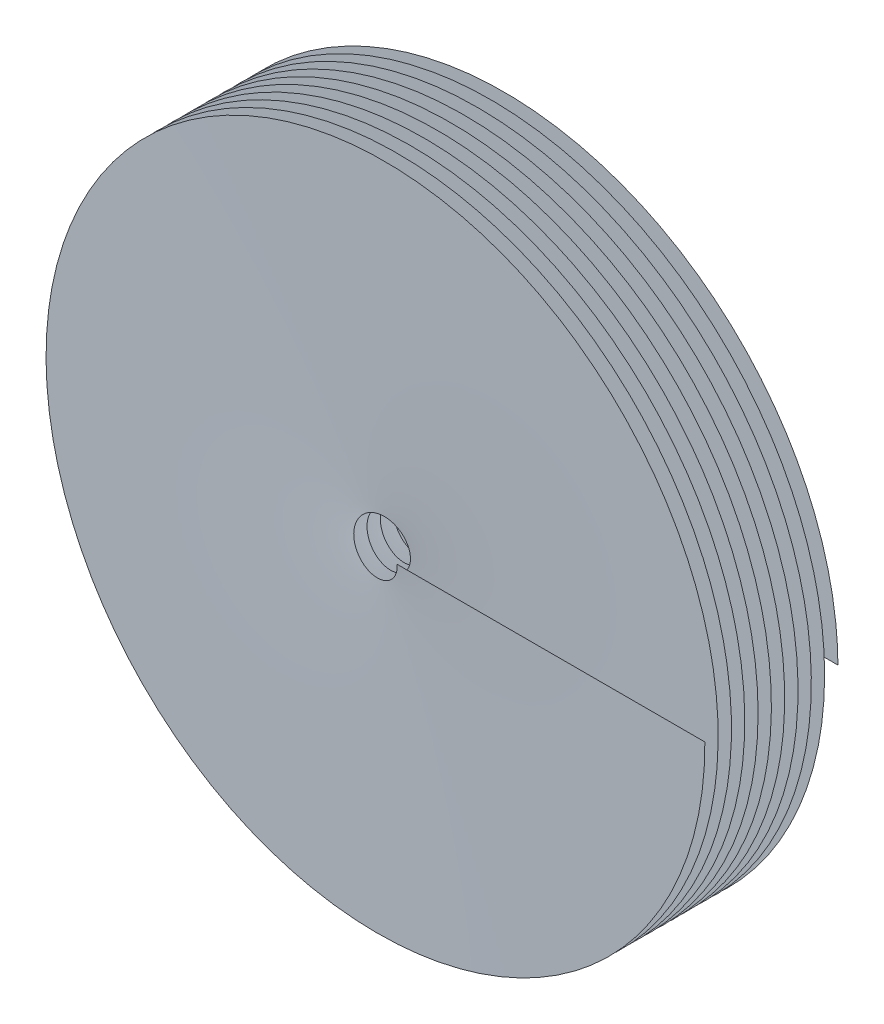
SolidWorks part; units mm, degrees
ref_plane "Ebene vorne" through (0, 0, 0) normal (0, 0, 1) x (1, 0, 0)
ref_plane "Ebene oben" through (0, 0, 0) normal (0, 1, 0) x (1, 0, 0)
ref_plane "Ebene rechts" through (0, 0, 0) normal (1, 0, 0) x (0, 0, -1)
sketch "Skizze1" plane through (0, 0, 0) normal (0, 0, 1) x (1, 0, 0)
  circle A0 centre (0, 0) radius 15
  dimension "D1" = 30
sketch "Skizze2" plane through (0, 0, 0) normal (0, 0, 1) x (1, 0, 0)
  circle A0 centre (0, 0) radius 200
  dimension "D1" = 400
sketch "Skizze3" plane through (0, 0, 0) normal (0, 0, 1) x (1, 0, 0)
  line L0 (0, 0) -> (0, 182.4244) construction
  line L1 (-104.5, 29.6606) -> (91, 59.3212)
  line L2 (91, -59.3212) -> (-104.5, -29.6606)
  arc A0 (-104.5, 29.6606) -> (-104.5, -29.6606) centre (-100, 0) ccw
  arc A1 (91, -59.3212) -> (91, 59.3212) centre (100, 0) ccw
  dimension "D2" = 60
  dimension "D3" = 120
  dimension "D1" = 200
curve "Spirale/Helix1"
curve "Spirale/Helix2"
sketch3d "3D-Skizze1"
  spline S1 degree 3 number of poles 174 (15, 0, 0) -> (15, 0, -80)
  spline S2 degree 3 number of poles 174 (15, 0, 0) -> (15, 0, -80)
  dimension "D1" = 0
sketch3d "3D-Skizze2"
  spline S1 degree 3 number of poles 631 (200, 0, 0) -> (200, 0, -80)
  spline S2 degree 3 number of poles 631 (200, 0, 0) -> (200, 0, -80)
  dimension "D1" = 0
surface "Oberfläche-Ausformung1"
curve "Kurve1"
sketch3d "3D-Skizze3"
  spline S41 degree 3 poles (-359.3412, -1881.1753, -94.2622) (-173.6201, -350.0532, -79.5033) (-27.3364, 68.2962, -78.5605) (105.9754, 59.7399, -79.3466) (108.1037, 59.4893, -79.3596) (112.3522, 58.7543, -79.3866) (114.4805, 58.2663, -79.4007) (120.6964, 56.4823, -79.4434) (124.6647, 54.8654, -79.4727) (130.354, 51.8003, -79.5185) (132.2165, 50.6632, -79.5342) (135.775, 48.2163, -79.5657) (137.4764, 46.9054, -79.5815) (140.7269, 44.1125, -79.6134) (142.2761, 42.6305, -79.6295) (145.2204, 39.4936, -79.6621) (146.6231, 37.8281, -79.6787) (150.5282, 32.6439, -79.7286) (152.7229, 28.9613, -79.7617) (156.312, 21.1524, -79.8291) (157.7024, 16.9952, -79.8635) (187.7213, -120.429, -80.9783) (-236.6379, -330.8914, -81.9988) (-1697.7832, -717.7515, -104.7507) knots -3.719865 -3.719865 -3.719865 -3.719865 0.125 0.125 0.1875 0.1875 0.25 0.25 0.375 0.375 0.4375 0.4375 0.5 0.5 0.5625 0.5625 0.625 0.625 0.75 0.75 0.875 0.875 4.849066 4.849066 4.849066 4.849066 only from (91, 59.3212, -79.2644) to (160, 0, -80)
  spline S42 degree 3 poles (-1357.1735, -160.3907, 1308.8398) (-937.7369, -96.7552, -142.9186) (-496.1136, -29.7537, -71.0355) (-47.4741, 38.3123, -76.8543) (-39.3285, 39.5482, -76.9898) (-23.0385, 42.0196, -77.3479) (-14.8942, 43.2553, -77.5752) (1.3942, 45.7265, -78.0414) (9.5385, 46.9621, -78.2686) (25.8285, 49.4336, -78.6268) (33.9741, 50.6694, -78.7623) (482.4832, 118.7156, -84.5793) (923.976, 185.6974, -12.7068) (1343.278, 249.3124, -1464.8064) knots -6.5093 -6.5093 -6.5093 -6.5093 0.25 0.25 0.375 0.375 0.5 0.5 0.625 0.625 0.75 0.75 7.5073 7.5073 7.5073 7.5073 only from (-104.5, 29.6606, -76.3521) to (91, 59.3212, -79.2644)
  spline S43 degree 3 poles (-1369.7277, 1498.9096, -97.16) (163.2714, 145.9086, -76.0341) (-48.797, -62.7048, -75.1691) (-116.0971, -25.3773, -75.7261) (-117.5879, -24.3686, -75.74) (-120.3426, -22.121, -75.7687) (-121.607, -20.887, -75.7835) (-123.9129, -18.2018, -75.8144) (-124.962, -16.7346, -75.8306) (-126.7606, -13.6754, -75.8633) (-127.5177, -12.0797, -75.8798) (-128.7483, -8.7564, -75.9136) (-129.2221, -7.0149, -75.931) (-129.8446, -3.5267, -75.9655) (-130.0004, -1.7673, -75.9827) (-129.9996, 1.7821, -76.0175) (-129.8384, 3.5782, -76.035) (-129.2108, 7.0611, -76.0695) (-128.7459, 8.7656, -76.0865) (-127.5092, 12.0998, -76.1204) (-126.7352, 13.7242, -76.1373) (-124.9383, 16.7692, -76.1698) (-123.9098, 18.2071, -76.1856) (-121.5862, 20.9096, -76.2167) (-120.3004, 22.1588, -76.2318) (-117.5591, 24.3885, -76.2603) (-116.0939, 25.3807, -76.2739) (-24.4215, 76.1344, -77.0319) (261.9676, -359.4578, -74.6286) (-587.0446, -1871.3902, -48.25) knots -2.532967 -2.532967 -2.532967 -2.532967 0.125 0.125 0.1875 0.1875 0.25 0.25 0.3125 0.3125 0.375 0.375 0.4375 0.4375 0.5 0.5 0.5625 0.5625 0.625 0.625 0.6875 0.6875 0.75 0.75 0.8125 0.8125 0.875 0.875 4.478279 4.478279 4.478279 4.478279 only from (-104.5, -29.6606, -75.6479) to (-104.5, 29.6606, -76.3521)
  spline S44 degree 3 poles (1343.7438, -249.3831, 1312.36) (924.2828, -185.7439, -139.3019) (482.6365, -118.7389, -67.4188) (33.9741, -50.6694, -73.2377) (25.8285, -49.4336, -73.3732) (9.5385, -46.9621, -73.7314) (1.3942, -45.7265, -73.9586) (-14.8942, -43.2553, -74.4248) (-23.0385, -42.0196, -74.6521) (-39.3285, -39.5482, -75.0102) (-47.4741, -38.3123, -75.1457) (-496.116, 29.754, -80.9645) (-937.7416, 96.7559, -9.0832) (-1357.1819, 160.392, -1460.7514) knots -6.509652 -6.509652 -6.509652 -6.509652 0.25 0.25 0.375 0.375 0.5 0.5 0.625 0.625 0.75 0.75 7.509336 7.509336 7.509336 7.509336 only from (91, -59.3212, -72.7355) to (-104.5, -29.6606, -75.6479)
  spline S45 degree 3 poles (-282.5926, -1895.7792, -87.7781) (-178.3224, -383.3794, -71.6159) (-32.3557, 68.6726, -70.5307) (108.1466, 59.5989, -71.3594) (112.4649, 58.8481, -71.3869) (120.7252, 56.4707, -71.4436) (124.695, 54.8531, -71.473) (130.4046, 51.771, -71.519) (132.2625, 50.6336, -71.5346) (135.8063, 48.1927, -71.566) (137.504, 46.8833, -71.5817) (140.7528, 44.0886, -71.6136) (142.3038, 42.6034, -71.6297) (145.2561, 39.4531, -71.6624) (146.66, 37.7821, -71.6791) (150.5448, 32.6159, -71.7287) (152.7384, 28.9351, -71.7619) (155.4341, 23.0587, -71.8125) (156.2359, 21.028, -71.8297) (157.6004, 16.9366, -71.8637) (158.1676, 14.8695, -71.8807) (159.5333, 8.6055, -71.9315) (159.9999, 4.3468, -71.9654) (160.0001, -4.3445, -72.0346) (159.5332, -8.6057, -72.0685) (158.1676, -14.8693, -72.1193) (157.6005, -16.936, -72.1363) (156.2365, -21.0261, -72.1703) (155.4348, -23.0571, -72.1874) (152.7386, -28.9349, -72.2381) (150.5448, -32.6157, -72.2713) (146.661, -37.7808, -72.3209) (145.2574, -39.4516, -72.3376) (142.3044, -42.6028, -72.3703) (140.7531, -44.0882, -72.3864) (137.5043, -46.883, -72.4183) (135.8067, -48.1924, -72.434) (132.2637, -50.6328, -72.4654) (130.4067, -51.7698, -72.481) (124.6954, -54.8531, -72.527) (120.7252, -56.4706, -72.5564) (112.4664, -58.8477, -72.6131) (108.1476, -59.5988, -72.6406) (-32.2172, -68.6641, -73.4685) (-176.6451, 382.4126, -72.3787) (-340.2125, 1885.129, -56.6277) knots -1.926806 -1.926806 -1.926806 -1.926806 0.0625 0.0625 0.125 0.125 0.1875 0.1875 0.21875 0.21875 0.25 0.25 0.28125 0.28125 0.3125 0.3125 0.375 0.375 0.40625 0.40625 0.4375 0.4375 0.5 0.5 0.5625 0.5625 0.59375 0.59375 0.625 0.625 0.6875 0.6875 0.71875 0.71875 0.75 0.75 0.78125 0.78125 0.8125 0.8125 0.875 0.875 0.9375 0.9375 2.924419 2.924419 2.924419 2.924419 only from (91, 59.3212, -71.2645) to (91, -59.3212, -72.7355)
  spline S46 degree 3 poles (-1356.9963, -160.3638, 1316.9526) (-937.7596, -96.7587, -134.9219) (-496.1228, -29.7551, -63.0354) (-47.4741, 38.3124, -68.8543) (-39.3285, 39.5482, -68.9898) (-23.0385, 42.0196, -69.3479) (-14.8942, 43.2553, -69.5752) (1.3942, 45.7265, -70.0414) (9.5385, 46.9621, -70.2686) (25.8285, 49.4336, -70.6268) (33.9741, 50.6694, -70.7623) (482.6385, 118.7392, -76.5812) (924.2866, 185.7445, -4.6998) (1343.7544, 249.3847, -1456.2936) knots -6.509441 -6.509441 -6.509441 -6.509441 0.25 0.25 0.375 0.375 0.5 0.5 0.625 0.625 0.75 0.75 7.509684 7.509684 7.509684 7.509684 only from (-104.5, 29.6606, -68.3521) to (91, 59.3212, -71.2645)
  spline S47 degree 3 poles (-1369.7277, 1498.9096, -89.1594) (163.2714, 145.9086, -68.0341) (-48.797, -62.7048, -67.1691) (-116.0971, -25.3773, -67.7261) (-117.5879, -24.3686, -67.74) (-120.3426, -22.121, -67.7687) (-121.607, -20.887, -67.7835) (-123.9129, -18.2018, -67.8144) (-124.962, -16.7346, -67.8306) (-126.7606, -13.6754, -67.8633) (-127.5177, -12.0797, -67.8798) (-128.7483, -8.7564, -67.9136) (-129.2221, -7.0149, -67.931) (-129.8446, -3.5267, -67.9655) (-130.0004, -1.7673, -67.9827) (-129.9996, 1.7821, -68.0175) (-129.8384, 3.5782, -68.035) (-129.2108, 7.0611, -68.0695) (-128.7459, 8.7656, -68.0865) (-127.5092, 12.0998, -68.1204) (-126.7352, 13.7242, -68.1373) (-124.9383, 16.7692, -68.1698) (-123.9098, 18.2071, -68.1856) (-121.5862, 20.9096, -68.2167) (-120.3004, 22.1588, -68.2318) (-117.5591, 24.3885, -68.2603) (-116.0939, 25.3807, -68.2739) (-24.4215, 76.1344, -69.0319) (261.9675, -359.4578, -66.6286) (-587.0446, -1871.3902, -40.25) knots -2.532967 -2.532967 -2.532967 -2.532967 0.125 0.125 0.1875 0.1875 0.25 0.25 0.3125 0.3125 0.375 0.375 0.4375 0.4375 0.5 0.5 0.5625 0.5625 0.625 0.625 0.6875 0.6875 0.75 0.75 0.8125 0.8125 0.875 0.875 4.478279 4.478279 4.478279 4.478279 only from (-104.5, -29.6606, -67.6479) to (-104.5, 29.6606, -68.3521)
  spline S48 degree 3 poles (1347.8046, -249.9992, 1317.5992) (923.4117, -185.6118, -131.2074) (482.3437, -118.6945, -59.4228) (33.9764, -50.6697, -65.2376) (25.8309, -49.4339, -65.3731) (9.5407, -46.9624, -65.7313) (1.3968, -45.7269, -65.9586) (-14.8909, -43.2558, -66.4247) (-23.0349, -42.0202, -66.652) (-39.325, -39.5487, -67.0102) (-47.471, -38.3128, -67.1457) (-495.5884, 29.674, -72.9579) (-936.1744, 96.5182, -1.2501) (-1364.6644, 161.5272, -1447.6159) knots -6.505294 -6.505294 -6.505294 -6.505294 0.25 0.25 0.375 0.375 0.5 0.5 0.625 0.625 0.75 0.75 7.50073 7.50073 7.50073 7.50073 only from (91, -59.3212, -64.7355) to (-104.5, -29.6606, -67.6479)
  spline S49 degree 3 poles (1714.3942, -1068.959, -82.5791) (-162.9522, -228.051, -63.0478) (-5.8483, 67.0494, -62.6867) (106.052, 59.7324, -63.3471) (108.1792, 59.4787, -63.3601) (112.4133, 58.7412, -63.3871) (114.5319, 58.2538, -63.4011) (120.7688, 56.4569, -63.4439) (124.7341, 54.833, -63.4733) (132.2888, 50.753, -63.5342) (135.8974, 48.2676, -63.566) (142.3963, 42.6725, -63.6298) (145.3318, 39.5458, -63.6621) (150.5515, 32.6096, -63.7288) (152.7475, 28.9149, -63.762) (156.3218, 21.1239, -63.8292) (157.7102, 16.9704, -63.8636) (159.5393, 8.5751, -63.9318) (160.0003, 4.3163, -63.9657) (159.9998, -2.1654, -64.0172) (159.8814, -4.3404, -64.0345) (159.417, -8.6168, -64.0687) (159.0713, -10.7317, -64.0857) (158.156, -14.9153, -64.1197) (157.5864, -16.984, -64.1366) (156.2185, -21.0744, -64.1707) (155.4157, -23.1028, -64.1878) (152.7167, -28.9743, -64.2385) (150.5217, -32.6512, -64.2716) (146.6366, -37.8109, -64.3212) (145.2327, -39.4798, -64.3378) (142.2799, -42.6271, -64.3705) (140.7288, -44.1107, -64.3866) (137.4805, -46.902, -64.4185) (135.7833, -48.2097, -64.4342) (132.2412, -50.6471, -64.4656) (130.3847, -51.7827, -64.4812) (124.676, -54.8616, -64.5272) (120.7078, -56.4768, -64.5565) (112.4532, -58.8503, -64.6132) (108.137, -59.6, -64.6406) (-32.2042, -68.6452, -65.4683) (-176.6085, 382.3052, -64.3788) (-340.1563, 1885.1154, -48.6247) knots -1.542537 -1.542537 -1.542537 -1.542537 0.0625 0.0625 0.09375 0.09375 0.125 0.125 0.1875 0.1875 0.25 0.25 0.3125 0.3125 0.375 0.375 0.4375 0.4375 0.5 0.5 0.53125 0.53125 0.5625 0.5625 0.59375 0.59375 0.625 0.625 0.6875 0.6875 0.71875 0.71875 0.75 0.75 0.78125 0.78125 0.8125 0.8125 0.875 0.875 0.9375 0.9375 2.925337 2.925337 2.925337 2.925337 only from (91, 59.3212, -63.2645) to (91, -59.3212, -64.7355)
  spline S50 degree 3 poles (-1356.8445, -160.3408, 1325.0582) (-937.7991, -96.7647, -126.9258) (-496.1405, -29.7578, -55.0352) (-47.4741, 38.3124, -60.8543) (-39.3284, 39.5482, -60.9898) (-23.0385, 42.0196, -61.3479) (-14.8942, 43.2553, -61.5752) (1.3942, 45.7265, -62.0414) (9.5385, 46.9621, -62.2687) (25.8285, 49.4336, -62.6268) (33.9741, 50.6694, -62.7623) (482.6385, 118.7392, -68.5812) (924.2863, 185.7445, 3.3015) (1343.7569, 249.3851, -1448.3571) knots -6.509711 -6.509711 -6.509711 -6.509711 0.25 0.25 0.375 0.375 0.5 0.5 0.625 0.625 0.75 0.75 7.509684 7.509684 7.509684 7.509684 only from (-104.5, 29.6606, -60.3521) to (91, 59.3212, -63.2645)
  spline S51 degree 3 poles (-1369.7277, 1498.9096, -81.1591) (163.2714, 145.9086, -60.0341) (-48.797, -62.7048, -59.1691) (-116.0971, -25.3773, -59.7261) (-117.5879, -24.3686, -59.74) (-120.3426, -22.121, -59.7687) (-121.607, -20.887, -59.7835) (-123.9129, -18.2018, -59.8144) (-124.962, -16.7346, -59.8306) (-126.7606, -13.6754, -59.8633) (-127.5177, -12.0797, -59.8798) (-128.7483, -8.7564, -59.9136) (-129.2221, -7.0149, -59.931) (-129.8446, -3.5267, -59.9655) (-130.0004, -1.7673, -59.9827) (-129.9996, 1.7821, -60.0175) (-129.8384, 3.5782, -60.035) (-129.2108, 7.0611, -60.0695) (-128.7459, 8.7656, -60.0865) (-127.5092, 12.0998, -60.1204) (-126.7352, 13.7242, -60.1373) (-124.9383, 16.7692, -60.1698) (-123.9098, 18.2071, -60.1856) (-121.5862, 20.9096, -60.2167) (-120.3004, 22.1588, -60.2318) (-117.5591, 24.3885, -60.2603) (-116.0939, 25.3807, -60.2739) (-24.4215, 76.1344, -61.0319) (261.9675, -359.4578, -58.6287) (-587.0446, -1871.3902, -32.2499) knots -2.532967 -2.532967 -2.532967 -2.532967 0.125 0.125 0.1875 0.1875 0.25 0.25 0.3125 0.3125 0.375 0.375 0.4375 0.4375 0.5 0.5 0.5625 0.5625 0.625 0.625 0.6875 0.6875 0.75 0.75 0.8125 0.8125 0.875 0.875 4.478279 4.478279 4.478279 4.478279 only from (-104.5, -29.6606, -59.6479) to (-104.5, 29.6606, -60.3521)
  spline S52 degree 3 poles (1343.3489, -249.3232, 1328.6563) (924.3019, -185.7468, -123.3095) (482.6419, -118.7397, -51.4186) (33.9741, -50.6694, -57.2377) (25.8284, -49.4336, -57.3732) (9.5385, -46.9621, -57.7314) (1.3942, -45.7265, -57.9586) (-14.8942, -43.2553, -58.4248) (-23.0385, -42.0196, -58.6521) (-39.3285, -39.5482, -59.0102) (-47.4741, -38.3123, -59.1457) (-496.1397, 29.7576, -64.9647) (-937.7887, 96.7631, 6.9187) (-1357.2604, 160.4039, -1444.7424) knots -6.509732 -6.509732 -6.509732 -6.509732 0.25 0.25 0.375 0.375 0.5 0.5 0.625 0.625 0.75 0.75 7.509703 7.509703 7.509703 7.509703 only from (91, -59.3212, -56.7355) to (-104.5, -29.6606, -59.6479)
  spline S53 degree 3 poles (1714.3942, -1068.959, -74.5796) (-162.9522, -228.051, -55.0478) (-5.8483, 67.0494, -54.6867) (106.052, 59.7324, -55.3471) (108.1792, 59.4787, -55.3601) (112.4133, 58.7412, -55.3871) (114.5319, 58.2538, -55.4011) (120.7688, 56.4569, -55.4439) (124.7341, 54.833, -55.4733) (132.2888, 50.753, -55.5342) (135.8974, 48.2676, -55.566) (142.3963, 42.6725, -55.6298) (145.3318, 39.5458, -55.6621) (150.5515, 32.6096, -55.7288) (152.7475, 28.9149, -55.762) (156.3218, 21.1239, -55.8292) (157.7102, 16.9704, -55.8636) (159.5393, 8.5751, -55.9318) (160.0003, 4.3163, -55.9657) (159.9998, -2.1654, -56.0172) (159.8814, -4.3404, -56.0345) (159.417, -8.6168, -56.0687) (159.0713, -10.7317, -56.0857) (158.156, -14.9153, -56.1197) (157.5864, -16.984, -56.1366) (156.2185, -21.0744, -56.1707) (155.4157, -23.1028, -56.1878) (152.7167, -28.9743, -56.2385) (150.5217, -32.6512, -56.2716) (146.6366, -37.8109, -56.3212) (145.2327, -39.4798, -56.3378) (142.2799, -42.6271, -56.3705) (140.7288, -44.1107, -56.3866) (137.4805, -46.902, -56.4185) (135.7833, -48.2097, -56.4343) (132.2412, -50.6471, -56.4656) (130.3847, -51.7827, -56.4812) (124.676, -54.8616, -56.5272) (120.7078, -56.4768, -56.5565) (112.4532, -58.8503, -56.6132) (108.137, -59.6, -56.6406) (-32.2042, -68.6452, -57.4683) (-176.6085, 382.3052, -56.3789) (-340.1563, 1885.1154, -40.624) knots -1.542537 -1.542537 -1.542537 -1.542537 0.0625 0.0625 0.09375 0.09375 0.125 0.125 0.1875 0.1875 0.25 0.25 0.3125 0.3125 0.375 0.375 0.4375 0.4375 0.5 0.5 0.53125 0.53125 0.5625 0.5625 0.59375 0.59375 0.625 0.625 0.6875 0.6875 0.71875 0.71875 0.75 0.75 0.78125 0.78125 0.8125 0.8125 0.875 0.875 0.9375 0.9375 2.925337 2.925337 2.925337 2.925337 only from (91, 59.3212, -55.2645) to (91, -59.3212, -56.7355)
  spline S54 degree 3 poles (-1364.5818, -161.5146, 1327.7178) (-936.1867, -96.52, -118.7515) (-495.5929, -29.6747, -47.0421) (-47.4715, 38.3128, -52.8543) (-39.3254, 39.5486, -52.9898) (-23.0352, 42.0201, -53.348) (-14.8911, 43.2557, -53.5753) (1.3969, 45.7269, -54.0414) (9.5409, 46.9625, -54.2687) (25.8304, 49.4339, -54.6268) (33.9758, 50.6696, -54.7623) (482.6309, 118.738, -60.581) (924.2695, 185.7419, 11.2992) (1343.7347, 249.3817, -1440.3666) knots -6.500842 -6.500842 -6.500842 -6.500842 0.25 0.25 0.375 0.375 0.5 0.5 0.625 0.625 0.75 0.75 7.509743 7.509743 7.509743 7.509743 only from (-104.5, 29.6606, -52.3521) to (91, 59.3212, -55.2645)
  spline S55 degree 3 poles (-1369.7277, 1498.9096, -73.1593) (163.2714, 145.9086, -52.0341) (-48.797, -62.7048, -51.1691) (-116.0971, -25.3773, -51.7261) (-117.5879, -24.3686, -51.74) (-120.3426, -22.121, -51.7687) (-121.607, -20.887, -51.7835) (-123.9129, -18.2018, -51.8144) (-124.962, -16.7346, -51.8306) (-126.7606, -13.6754, -51.8633) (-127.5177, -12.0797, -51.8798) (-128.7483, -8.7564, -51.9136) (-129.2221, -7.0149, -51.931) (-129.8446, -3.5267, -51.9655) (-130.0004, -1.7673, -51.9827) (-129.9996, 1.7821, -52.0175) (-129.8384, 3.5782, -52.035) (-129.2108, 7.0611, -52.0695) (-128.7459, 8.7656, -52.0865) (-127.5092, 12.0998, -52.1204) (-126.7352, 13.7242, -52.1373) (-124.9383, 16.7692, -52.1698) (-123.9098, 18.2071, -52.1856) (-121.5862, 20.9096, -52.2167) (-120.3004, 22.1588, -52.2318) (-117.5591, 24.3885, -52.2603) (-116.0939, 25.3807, -52.2739) (-24.4215, 76.1344, -53.0319) (261.9675, -359.4578, -50.6287) (-587.0446, -1871.3902, -24.2497) knots -2.532967 -2.532967 -2.532967 -2.532967 0.125 0.125 0.1875 0.1875 0.25 0.25 0.3125 0.3125 0.375 0.375 0.4375 0.4375 0.5 0.5 0.5625 0.5625 0.625 0.625 0.6875 0.6875 0.75 0.75 0.8125 0.8125 0.875 0.875 4.478279 4.478279 4.478279 4.478279 only from (-104.5, -29.6606, -51.6479) to (-104.5, 29.6606, -52.3521)
  spline S56 degree 3 poles (1351.0284, -250.4883, 1331.3482) (922.6512, -185.4964, -115.1342) (482.0751, -118.6537, -43.4257) (33.9715, -50.669, -49.2377) (25.8254, -49.4331, -49.3732) (9.5352, -46.9616, -49.7314) (1.3911, -45.726, -49.9587) (-14.8969, -43.2549, -50.4249) (-23.0409, -42.0193, -50.6521) (-39.3304, -39.5479, -51.0103) (-47.4758, -38.3121, -51.1458) (-496.1438, 29.7582, -56.9645) (-937.7952, 96.7641, 14.9158) (-1357.2743, 160.406, -1436.6832) knots -6.500569 -6.500569 -6.500569 -6.500569 0.25 0.25 0.375 0.375 0.5 0.5 0.625 0.625 0.75 0.75 7.509941 7.509941 7.509941 7.509941 only from (91, -59.3212, -48.7355) to (-104.5, -29.6606, -51.6479)
  spline S57 degree 3 poles (1714.3942, -1068.959, -66.5794) (-162.9522, -228.051, -47.0478) (-5.8483, 67.0494, -46.6867) (106.052, 59.7324, -47.3471) (108.1792, 59.4787, -47.3601) (112.4133, 58.7412, -47.3871) (114.5319, 58.2538, -47.4011) (120.7688, 56.4569, -47.4439) (124.7341, 54.833, -47.4733) (132.2888, 50.753, -47.5342) (135.8974, 48.2676, -47.566) (142.3963, 42.6725, -47.6298) (145.3318, 39.5458, -47.6621) (150.5515, 32.6096, -47.7288) (152.7475, 28.9149, -47.762) (156.3218, 21.1239, -47.8292) (157.7102, 16.9704, -47.8636) (159.5393, 8.5751, -47.9318) (160.0003, 4.3163, -47.9657) (159.9998, -2.1654, -48.0172) (159.8814, -4.3404, -48.0345) (159.417, -8.6168, -48.0687) (159.0713, -10.7317, -48.0857) (158.156, -14.9153, -48.1197) (157.5864, -16.984, -48.1366) (156.2185, -21.0744, -48.1707) (155.4157, -23.1028, -48.1878) (152.7167, -28.9743, -48.2385) (150.5217, -32.6512, -48.2716) (146.6366, -37.8109, -48.3212) (145.2327, -39.4798, -48.3378) (142.2799, -42.6271, -48.3705) (140.7288, -44.1107, -48.3866) (137.4805, -46.902, -48.4185) (135.7833, -48.2097, -48.4343) (132.2412, -50.6471, -48.4656) (130.3847, -51.7827, -48.4812) (124.676, -54.8616, -48.5272) (120.7078, -56.4768, -48.5565) (112.4532, -58.8503, -48.6132) (108.137, -59.6, -48.6406) (-32.2042, -68.6452, -49.4683) (-176.6085, 382.3052, -48.3789) (-340.1563, 1885.1154, -32.6249) knots -1.542537 -1.542537 -1.542537 -1.542537 0.0625 0.0625 0.09375 0.09375 0.125 0.125 0.1875 0.1875 0.25 0.25 0.3125 0.3125 0.375 0.375 0.4375 0.4375 0.5 0.5 0.53125 0.53125 0.5625 0.5625 0.59375 0.59375 0.625 0.625 0.6875 0.6875 0.71875 0.71875 0.75 0.75 0.78125 0.78125 0.8125 0.8125 0.875 0.875 0.9375 0.9375 2.925337 2.925337 2.925337 2.925337 only from (91, 59.3212, -47.2645) to (91, -59.3212, -48.7355)
  spline S58 degree 3 poles (-1356.554, -160.2967, 1341.1849) (-937.8862, -96.7779, -110.9325) (-496.1799, -29.7637, -39.0348) (-47.474, 38.3124, -44.8543) (-39.3284, 39.5482, -44.9898) (-23.0384, 42.0196, -45.3479) (-14.8941, 43.2553, -45.5752) (1.3943, 45.7265, -46.0414) (9.5386, 46.9621, -46.2687) (25.8285, 49.4336, -46.6268) (33.9742, 50.6694, -46.7623) (482.6127, 118.7353, -52.581) (924.2343, 185.7366, 19.2992) (1343.6866, 249.3744, -1432.3673) knots -6.510312 -6.510312 -6.510312 -6.510312 0.25 0.25 0.375 0.375 0.5 0.5 0.625 0.625 0.75 0.75 7.509291 7.509291 7.509291 7.509291 only from (-104.5, 29.6606, -44.3521) to (91, 59.3212, -47.2645)
  spline S59 degree 3 poles (-1369.7277, 1498.9096, -65.16) (163.2714, 145.9086, -44.0341) (-48.797, -62.7048, -43.1691) (-116.0971, -25.3773, -43.7261) (-117.5879, -24.3686, -43.74) (-120.3426, -22.121, -43.7687) (-121.607, -20.887, -43.7835) (-123.9129, -18.2018, -43.8144) (-124.962, -16.7346, -43.8306) (-126.7606, -13.6754, -43.8633) (-127.5177, -12.0797, -43.8798) (-128.7483, -8.7564, -43.9136) (-129.2221, -7.0149, -43.931) (-129.8446, -3.5267, -43.9655) (-130.0004, -1.7673, -43.9827) (-129.9996, 1.7821, -44.0175) (-129.8384, 3.5782, -44.035) (-129.2108, 7.0611, -44.0695) (-128.7459, 8.7656, -44.0865) (-127.5092, 12.0998, -44.1204) (-126.7352, 13.7242, -44.1373) (-124.9383, 16.7692, -44.1698) (-123.9098, 18.2071, -44.1856) (-121.5862, 20.9096, -44.2167) (-120.3004, 22.1588, -44.2318) (-117.5591, 24.3885, -44.2603) (-116.0939, 25.3807, -44.2739) (-24.4215, 76.1344, -45.0319) (261.9675, -359.4578, -42.6287) (-587.0446, -1871.3902, -16.2493) knots -2.532967 -2.532967 -2.532967 -2.532967 0.125 0.125 0.1875 0.1875 0.25 0.25 0.3125 0.3125 0.375 0.375 0.4375 0.4375 0.5 0.5 0.5625 0.5625 0.625 0.625 0.6875 0.6875 0.75 0.75 0.8125 0.8125 0.875 0.875 4.478279 4.478279 4.478279 4.478279 only from (-104.5, -29.6606, -43.6479) to (-104.5, 29.6606, -44.3521)
  spline S60 degree 3 poles (1342.9872, -249.2683, 1344.9092) (924.3427, -185.753, -107.3166) (482.6581, -118.7422, -35.4184) (33.974, -50.6694, -41.2377) (25.8284, -49.4336, -41.3732) (9.5384, -46.9621, -41.7314) (1.3941, -45.7265, -41.9586) (-14.8943, -43.2552, -42.4248) (-23.0386, -42.0196, -42.6521) (-39.3285, -39.5482, -43.0102) (-47.4742, -38.3123, -43.1457) (-496.1369, 29.7572, -48.9646) (-937.7827, 96.7622, 22.9164) (-1357.2604, 160.4039, -1428.6716) knots -6.509978 -6.509978 -6.509978 -6.509978 0.25 0.25 0.375 0.375 0.5 0.5 0.625 0.625 0.75 0.75 7.509663 7.509663 7.509663 7.509663 only from (91, -59.3212, -40.7355) to (-104.5, -29.6606, -43.6479)
  spline S61 degree 3 poles (1714.3942, -1068.959, -58.5796) (-162.9522, -228.051, -39.0478) (-5.8483, 67.0494, -38.6867) (106.052, 59.7324, -39.3471) (108.1792, 59.4787, -39.3601) (112.4133, 58.7412, -39.3871) (114.5319, 58.2538, -39.4011) (120.7688, 56.4569, -39.4439) (124.7341, 54.833, -39.4733) (132.2888, 50.753, -39.5342) (135.8974, 48.2676, -39.566) (142.3963, 42.6725, -39.6298) (145.3318, 39.5458, -39.6621) (150.5515, 32.6096, -39.7288) (152.7475, 28.9149, -39.762) (156.3218, 21.1239, -39.8292) (157.7102, 16.9704, -39.8636) (159.5393, 8.5751, -39.9318) (160.0003, 4.3163, -39.9657) (159.9998, -2.1654, -40.0172) (159.8814, -4.3404, -40.0345) (159.417, -8.6168, -40.0687) (159.0713, -10.7317, -40.0857) (158.156, -14.9153, -40.1197) (157.5864, -16.984, -40.1366) (156.2185, -21.0744, -40.1707) (155.4157, -23.1028, -40.1878) (152.7167, -28.9743, -40.2385) (150.5217, -32.6512, -40.2716) (146.6366, -37.8109, -40.3212) (145.2327, -39.4798, -40.3378) (142.2799, -42.6271, -40.3705) (140.7288, -44.1107, -40.3866) (137.4805, -46.902, -40.4185) (135.7833, -48.2097, -40.4343) (132.2412, -50.6471, -40.4656) (130.3847, -51.7827, -40.4812) (124.676, -54.8616, -40.5272) (120.7078, -56.4768, -40.5565) (112.4532, -58.8503, -40.6132) (108.137, -59.6, -40.6406) (-32.2042, -68.6452, -41.4683) (-176.6085, 382.3052, -40.3789) (-340.1563, 1885.1154, -24.6248) knots -1.542537 -1.542537 -1.542537 -1.542537 0.0625 0.0625 0.09375 0.09375 0.125 0.125 0.1875 0.1875 0.25 0.25 0.3125 0.3125 0.375 0.375 0.4375 0.4375 0.5 0.5 0.53125 0.53125 0.5625 0.5625 0.59375 0.59375 0.625 0.625 0.6875 0.6875 0.71875 0.71875 0.75 0.75 0.78125 0.78125 0.8125 0.8125 0.875 0.875 0.9375 0.9375 2.925337 2.925337 2.925337 2.925337 only from (91, 59.3212, -39.2645) to (91, -59.3212, -40.7355)
  spline S62 degree 3 poles (-1356.4063, -160.2743, 1349.2816) (-937.9285, -96.7843, -102.9368) (-496.199, -29.7666, -31.0346) (-47.474, 38.3124, -36.8543) (-39.3284, 39.5482, -36.9898) (-23.0384, 42.0197, -37.3479) (-14.8941, 43.2553, -37.5752) (1.3943, 45.7265, -38.0414) (9.5386, 46.9621, -38.2686) (25.8285, 49.4336, -38.6268) (33.9742, 50.6694, -38.7623) (482.6067, 118.7344, -44.581) (924.222, 185.7347, 27.2997) (1343.6715, 249.3721, -1424.4027) knots -6.510603 -6.510603 -6.510603 -6.510603 0.25 0.25 0.375 0.375 0.5 0.5 0.625 0.625 0.75 0.75 7.5092 7.5092 7.5092 7.5092 only from (-104.5, 29.6606, -36.3521) to (91, 59.3212, -39.2645)
  spline S63 degree 3 poles (-1369.7277, 1498.9096, -57.1604) (163.2714, 145.9086, -36.0341) (-48.797, -62.7048, -35.1691) (-116.0971, -25.3773, -35.7261) (-117.5879, -24.3686, -35.74) (-120.3426, -22.121, -35.7687) (-121.607, -20.887, -35.7835) (-123.9129, -18.2018, -35.8144) (-124.962, -16.7346, -35.8306) (-126.7606, -13.6754, -35.8633) (-127.5177, -12.0797, -35.8798) (-128.7483, -8.7564, -35.9136) (-129.2221, -7.0149, -35.931) (-129.8446, -3.5267, -35.9655) (-130.0004, -1.7673, -35.9827) (-129.9996, 1.7821, -36.0175) (-129.8384, 3.5782, -36.035) (-129.2108, 7.0611, -36.0695) (-128.7459, 8.7656, -36.0865) (-127.5092, 12.0998, -36.1204) (-126.7352, 13.7242, -36.1373) (-124.9383, 16.7692, -36.1698) (-123.9098, 18.2071, -36.1856) (-121.5862, 20.9096, -36.2167) (-120.3004, 22.1588, -36.2318) (-117.5591, 24.3885, -36.2603) (-116.0939, 25.3807, -36.2739) (-24.4215, 76.1344, -37.0319) (261.9675, -359.4578, -34.6287) (-587.0446, -1871.3902, -8.2504) knots -2.532967 -2.532967 -2.532967 -2.532967 0.125 0.125 0.1875 0.1875 0.25 0.25 0.3125 0.3125 0.375 0.375 0.4375 0.4375 0.5 0.5 0.5625 0.5625 0.625 0.625 0.6875 0.6875 0.75 0.75 0.8125 0.8125 0.875 0.875 4.478279 4.478279 4.478279 4.478279 only from (-104.5, -29.6606, -35.6479) to (-104.5, 29.6606, -36.3521)
  spline S64 degree 3 poles (1342.8382, -249.2457, 1352.9966) (924.384, -185.7593, -99.3202) (482.6767, -118.745, -27.4182) (33.974, -50.6694, -33.2377) (25.8284, -49.4335, -33.3732) (9.5384, -46.9621, -33.7314) (1.3941, -45.7265, -33.9586) (-14.8943, -43.2552, -34.4248) (-23.0386, -42.0196, -34.6521) (-39.3285, -39.5482, -35.0102) (-47.4742, -38.3123, -35.1457) (-496.1351, 29.7569, -40.9646) (-937.7789, 96.7616, 30.9177) (-1357.2575, 160.4034, -1420.7442) knots -6.510262 -6.510262 -6.510262 -6.510262 0.25 0.25 0.375 0.375 0.5 0.5 0.625 0.625 0.75 0.75 7.509636 7.509636 7.509636 7.509636 only from (91, -59.3212, -32.7355) to (-104.5, -29.6606, -35.6479)
  spline S65 degree 3 poles (1714.3942, -1068.959, -50.5796) (-162.9522, -228.051, -31.0479) (-5.8483, 67.0494, -30.6867) (106.052, 59.7324, -31.3471) (108.1792, 59.4787, -31.3601) (112.4133, 58.7412, -31.3871) (114.5319, 58.2538, -31.4011) (120.7688, 56.4569, -31.4439) (124.7341, 54.833, -31.4733) (132.2888, 50.753, -31.5342) (135.8974, 48.2676, -31.566) (142.3963, 42.6725, -31.6298) (145.3318, 39.5458, -31.6621) (150.5515, 32.6096, -31.7288) (152.7475, 28.9149, -31.762) (156.3218, 21.1239, -31.8292) (157.7102, 16.9704, -31.8636) (159.5393, 8.5751, -31.9318) (160.0003, 4.3163, -31.9657) (159.9998, -2.1654, -32.0172) (159.8814, -4.3404, -32.0345) (159.417, -8.6168, -32.0687) (159.0713, -10.7317, -32.0857) (158.156, -14.9153, -32.1197) (157.5864, -16.984, -32.1366) (156.2185, -21.0744, -32.1707) (155.4157, -23.1028, -32.1878) (152.7167, -28.9743, -32.2385) (150.5217, -32.6512, -32.2716) (146.6366, -37.8109, -32.3212) (145.2327, -39.4798, -32.3378) (142.2799, -42.6271, -32.3705) (140.7288, -44.1107, -32.3866) (137.4805, -46.902, -32.4185) (135.7833, -48.2097, -32.4343) (132.2412, -50.6471, -32.4656) (130.3847, -51.7827, -32.4812) (124.676, -54.8616, -32.5272) (120.7078, -56.4768, -32.5565) (112.4532, -58.8503, -32.6132) (108.137, -59.6, -32.6406) (-32.2042, -68.6452, -33.4683) (-176.6085, 382.3052, -32.379) (-340.1562, 1885.1154, -16.6252) knots -1.542537 -1.542537 -1.542537 -1.542537 0.0625 0.0625 0.09375 0.09375 0.125 0.125 0.1875 0.1875 0.25 0.25 0.3125 0.3125 0.375 0.375 0.4375 0.4375 0.5 0.5 0.53125 0.53125 0.5625 0.5625 0.59375 0.59375 0.625 0.625 0.6875 0.6875 0.71875 0.71875 0.75 0.75 0.78125 0.78125 0.8125 0.8125 0.875 0.875 0.9375 0.9375 2.925337 2.925337 2.925337 2.925337 only from (91, 59.3212, -31.2645) to (91, -59.3212, -32.7355)
  spline S66 degree 3 poles (-1356.2516, -160.2508, 1357.4033) (-937.9675, -96.7902, -94.9398) (-496.2171, -29.7694, -23.0345) (-47.4757, 38.3121, -28.8542) (-39.3303, 39.5479, -28.9897) (-23.0408, 42.0193, -29.3479) (-14.8967, 43.2549, -29.5751) (1.3912, 45.726, -30.0413) (9.5353, 46.9616, -30.2686) (25.8255, 49.4331, -30.6268) (33.9715, 50.669, -30.7623) (482.0819, 118.6547, -36.5744) (922.6647, 185.4984, 35.1363) (1350.9922, 250.4828, -1411.4136) knots -6.511057 -6.511057 -6.511057 -6.511057 0.25 0.25 0.375 0.375 0.5 0.5 0.625 0.625 0.75 0.75 7.50068 7.50068 7.50068 7.50068 only from (-104.5, 29.6606, -28.3521) to (91, 59.3212, -31.2645)
  spline S67 degree 3 poles (-1369.7277, 1498.9096, -49.1603) (163.2714, 145.9086, -28.0341) (-48.797, -62.7048, -27.1691) (-116.0971, -25.3773, -27.7261) (-117.5879, -24.3686, -27.74) (-120.3426, -22.121, -27.7687) (-121.607, -20.887, -27.7835) (-123.9129, -18.2018, -27.8144) (-124.962, -16.7346, -27.8306) (-126.7606, -13.6754, -27.8633) (-127.5177, -12.0797, -27.8798) (-128.7483, -8.7564, -27.9136) (-129.2221, -7.0149, -27.931) (-129.8446, -3.5267, -27.9655) (-130.0004, -1.7673, -27.9827) (-129.9996, 1.7821, -28.0175) (-129.8384, 3.5782, -28.035) (-129.2108, 7.0611, -28.0695) (-128.7459, 8.7656, -28.0865) (-127.5092, 12.0998, -28.1204) (-126.7352, 13.7242, -28.1373) (-124.9383, 16.7692, -28.1698) (-123.9098, 18.2071, -28.1856) (-121.5862, 20.9096, -28.2167) (-120.3004, 22.1588, -28.2318) (-117.5591, 24.3885, -28.2603) (-116.0939, 25.3807, -28.2739) (-24.4215, 76.1344, -29.0319) (261.9676, -359.4578, -26.6286) (-587.0446, -1871.3902, -0.2522) knots -2.532967 -2.532967 -2.532967 -2.532967 0.125 0.125 0.1875 0.1875 0.25 0.25 0.3125 0.3125 0.375 0.375 0.4375 0.4375 0.5 0.5 0.5625 0.5625 0.625 0.625 0.6875 0.6875 0.75 0.75 0.8125 0.8125 0.875 0.875 4.478279 4.478279 4.478279 4.478279 only from (-104.5, -29.6606, -27.6479) to (-104.5, 29.6606, -28.3521)
  spline S68 degree 3 poles (1347.336, -249.9281, 1357.9103) (923.4923, -185.624, -91.2171) (482.3769, -118.6995, -19.4224) (33.9764, -50.6697, -25.2376) (25.8309, -49.4339, -25.3731) (9.5408, -46.9624, -25.7313) (1.3968, -45.7269, -25.9586) (-14.8909, -43.2558, -26.4247) (-23.0349, -42.0202, -26.652) (-39.325, -39.5487, -27.0102) (-47.471, -38.3128, -27.1457) (-495.5911, 29.6744, -32.9579) (-936.1842, 96.5197, 38.7516) (-1364.4957, 161.5016, -1407.7099) knots -6.505806 -6.505806 -6.505806 -6.505806 0.25 0.25 0.375 0.375 0.5 0.5 0.625 0.625 0.75 0.75 7.500771 7.500771 7.500771 7.500771 only from (91, -59.3212, -24.7355) to (-104.5, -29.6606, -27.6479)
  spline S69 degree 3 poles (1714.3942, -1068.959, -42.58) (-162.9522, -228.051, -23.0479) (-5.8483, 67.0494, -22.6867) (106.052, 59.7324, -23.3471) (108.1792, 59.4787, -23.3601) (112.4133, 58.7412, -23.3871) (114.5319, 58.2538, -23.4011) (120.7688, 56.4569, -23.4439) (124.7341, 54.833, -23.4733) (132.2888, 50.753, -23.5342) (135.8974, 48.2676, -23.566) (142.3963, 42.6725, -23.6298) (145.3318, 39.5458, -23.6621) (150.5515, 32.6096, -23.7288) (152.7475, 28.9149, -23.762) (156.3218, 21.1239, -23.8292) (157.7102, 16.9704, -23.8636) (159.5393, 8.5751, -23.9318) (160.0003, 4.3163, -23.9657) (159.9998, -2.1654, -24.0172) (159.8814, -4.3404, -24.0345) (159.417, -8.6168, -24.0687) (159.0713, -10.7317, -24.0857) (158.156, -14.9153, -24.1197) (157.5864, -16.984, -24.1366) (156.2185, -21.0744, -24.1707) (155.4157, -23.1028, -24.1878) (152.7167, -28.9743, -24.2385) (150.5217, -32.6512, -24.2716) (146.6366, -37.8109, -24.3212) (145.2327, -39.4798, -24.3378) (142.2799, -42.6271, -24.3705) (140.7288, -44.1107, -24.3866) (137.4805, -46.902, -24.4185) (135.7833, -48.2097, -24.4343) (132.2412, -50.6471, -24.4656) (130.3847, -51.7827, -24.4812) (124.676, -54.8616, -24.5272) (120.7078, -56.4768, -24.5565) (112.4532, -58.8503, -24.6132) (108.137, -59.6, -24.6406) (-32.2042, -68.6452, -25.4683) (-176.6085, 382.3052, -24.379) (-340.1563, 1885.1154, -8.6246) knots -1.542537 -1.542537 -1.542537 -1.542537 0.0625 0.0625 0.09375 0.09375 0.125 0.125 0.1875 0.1875 0.25 0.25 0.3125 0.3125 0.375 0.375 0.4375 0.4375 0.5 0.5 0.53125 0.53125 0.5625 0.5625 0.59375 0.59375 0.625 0.625 0.6875 0.6875 0.71875 0.71875 0.75 0.75 0.78125 0.78125 0.8125 0.8125 0.875 0.875 0.9375 0.9375 2.925337 2.925337 2.925337 2.925337 only from (91, 59.3212, -23.2645) to (91, -59.3212, -24.7355)
  spline S70 degree 3 poles (-1356.0684, -160.223, 1365.5633) (-937.9854, -96.7929, -86.9461) (-496.2233, -29.7703, -15.0342) (-47.474, 38.3124, -20.8543) (-39.3283, 39.5482, -20.9898) (-23.0384, 42.0197, -21.3479) (-14.8941, 43.2553, -21.5752) (1.3943, 45.7265, -22.0414) (9.5386, 46.9621, -22.2686) (25.8286, 49.4336, -22.6268) (33.9742, 50.6694, -22.7623) (482.6139, 118.7355, -28.581) (924.236, 185.7368, 43.3002) (1343.7006, 249.3765, -1408.3793) knots -6.510973 -6.510973 -6.510973 -6.510973 0.25 0.25 0.375 0.375 0.5 0.5 0.625 0.625 0.75 0.75 7.509313 7.509313 7.509313 7.509313 only from (-104.5, 29.6606, -20.3521) to (91, 59.3212, -23.2645)
  spline S71 degree 3 poles (-1369.7277, 1498.9096, -41.1602) (163.2714, 145.9086, -20.0341) (-48.797, -62.7048, -19.1691) (-116.0971, -25.3773, -19.7261) (-117.5879, -24.3686, -19.74) (-120.3426, -22.121, -19.7687) (-121.607, -20.887, -19.7835) (-123.9129, -18.2018, -19.8144) (-124.962, -16.7346, -19.8306) (-126.7606, -13.6754, -19.8633) (-127.5177, -12.0797, -19.8798) (-128.7483, -8.7564, -19.9136) (-129.2221, -7.0149, -19.931) (-129.8446, -3.5267, -19.9655) (-130.0004, -1.7673, -19.9827) (-129.9996, 1.7821, -20.0175) (-129.8384, 3.5782, -20.035) (-129.2108, 7.0611, -20.0695) (-128.7459, 8.7656, -20.0865) (-127.5092, 12.0998, -20.1204) (-126.7352, 13.7242, -20.1373) (-124.9383, 16.7692, -20.1698) (-123.9098, 18.2071, -20.1856) (-121.5862, 20.9096, -20.2167) (-120.3004, 22.1588, -20.2318) (-117.5591, 24.3885, -20.2603) (-116.0939, 25.3807, -20.2739) (-24.4215, 76.1344, -21.0319) (261.9676, -359.4578, -18.6286) (-587.0447, -1871.3902, 7.7473) knots -2.532967 -2.532967 -2.532967 -2.532967 0.125 0.125 0.1875 0.1875 0.25 0.25 0.3125 0.3125 0.375 0.375 0.4375 0.4375 0.5 0.5 0.5625 0.5625 0.625 0.625 0.6875 0.6875 0.75 0.75 0.8125 0.8125 0.875 0.875 4.478279 4.478279 4.478279 4.478279 only from (-104.5, -29.6606, -19.6479) to (-104.5, 29.6606, -20.3521)
  spline S72 degree 3 poles (1342.5648, -249.2042, 1369.1782) (924.483, -185.7743, -83.3289) (482.7221, -118.7519, -11.4177) (33.974, -50.6694, -17.2377) (25.8283, -49.4335, -17.3732) (9.5384, -46.9621, -17.7314) (1.3941, -45.7265, -17.9586) (-14.8943, -43.2552, -18.4248) (-23.0386, -42.0196, -18.6521) (-39.3286, -39.5482, -19.0102) (-47.4742, -38.3123, -19.1457) (-496.1103, 29.7532, -24.9644) (-937.7288, 96.754, 46.9158) (-1357.19, 160.3932, -1404.7596) knots -6.510955 -6.510955 -6.510955 -6.510955 0.25 0.25 0.375 0.375 0.5 0.5 0.625 0.625 0.75 0.75 7.509258 7.509258 7.509258 7.509258 only from (91, -59.3212, -16.7355) to (-104.5, -29.6606, -19.6479)
  spline S73 degree 3 poles (1714.3942, -1068.959, -34.5796) (-162.9522, -228.051, -15.0479) (-5.8483, 67.0494, -14.6867) (106.052, 59.7324, -15.3471) (108.1792, 59.4787, -15.3601) (112.4133, 58.7412, -15.3871) (114.5319, 58.2538, -15.4011) (120.7688, 56.4569, -15.4439) (124.7341, 54.833, -15.4733) (132.2888, 50.753, -15.5342) (135.8974, 48.2676, -15.566) (142.3963, 42.6725, -15.6298) (145.3318, 39.5458, -15.6621) (150.5515, 32.6096, -15.7288) (152.7475, 28.9149, -15.762) (156.3218, 21.1239, -15.8292) (157.7102, 16.9704, -15.8636) (159.5393, 8.5751, -15.9318) (160.0003, 4.3163, -15.9657) (159.9998, -2.1654, -16.0172) (159.8814, -4.3404, -16.0345) (159.417, -8.6168, -16.0687) (159.0713, -10.7317, -16.0857) (158.156, -14.9153, -16.1197) (157.5864, -16.984, -16.1366) (156.2185, -21.0744, -16.1707) (155.4157, -23.1028, -16.1878) (152.7167, -28.9743, -16.2385) (150.5217, -32.6512, -16.2716) (146.6366, -37.8109, -16.3212) (145.2327, -39.4798, -16.3378) (142.2799, -42.6271, -16.3705) (140.7288, -44.1107, -16.3866) (137.4805, -46.902, -16.4185) (135.7833, -48.2097, -16.4343) (132.2412, -50.6471, -16.4656) (130.3847, -51.7827, -16.4812) (124.676, -54.8616, -16.5272) (120.7078, -56.4768, -16.5565) (112.4532, -58.8503, -16.6132) (108.137, -59.6, -16.6406) (-32.2042, -68.6452, -17.4683) (-176.6085, 382.3052, -16.3789) (-340.1562, 1885.1154, -0.6255) knots -1.542537 -1.542537 -1.542537 -1.542537 0.0625 0.0625 0.09375 0.09375 0.125 0.125 0.1875 0.1875 0.25 0.25 0.3125 0.3125 0.375 0.375 0.4375 0.4375 0.5 0.5 0.53125 0.53125 0.5625 0.5625 0.59375 0.59375 0.625 0.625 0.6875 0.6875 0.71875 0.71875 0.75 0.75 0.78125 0.78125 0.8125 0.8125 0.875 0.875 0.9375 0.9375 2.925337 2.925337 2.925337 2.925337 only from (91, 59.3212, -15.2645) to (91, -59.3212, -16.7355)
  spline S74 degree 3 poles (-1360.8225, -160.9443, 1370.3103) (-937.0012, -96.6436, -78.8351) (-495.8807, -29.7183, -7.0389) (-47.4764, 38.312, -12.8542) (-39.3309, 39.5478, -12.9897) (-23.0408, 42.0193, -13.3479) (-14.8968, 43.2549, -13.5752) (1.3909, 45.726, -14.0413) (9.5349, 46.9616, -14.2685) (25.825, 49.433, -14.6267) (33.971, 50.6689, -14.7623) (482.0971, 118.657, -20.5746) (922.698, 185.5035, 51.1369) (1350.9431, 250.4753, -1395.3496) knots -6.505866 -6.505866 -6.505866 -6.505866 0.25 0.25 0.375 0.375 0.5 0.5 0.625 0.625 0.75 0.75 7.500862 7.500862 7.500862 7.500862 only from (-104.5, 29.6606, -12.3521) to (91, 59.3212, -15.2645)
  spline S75 degree 3 poles (-1369.7277, 1498.9096, -33.1603) (163.2714, 145.9086, -12.0341) (-48.797, -62.7048, -11.1691) (-116.0971, -25.3773, -11.7261) (-117.5879, -24.3686, -11.74) (-120.3426, -22.121, -11.7687) (-121.607, -20.887, -11.7835) (-123.9129, -18.2018, -11.8144) (-124.962, -16.7346, -11.8306) (-126.7606, -13.6754, -11.8633) (-127.5177, -12.0797, -11.8798) (-128.7483, -8.7564, -11.9136) (-129.2221, -7.0149, -11.931) (-129.8446, -3.5267, -11.9655) (-130.0004, -1.7673, -11.9827) (-129.9996, 1.7821, -12.0175) (-129.8384, 3.5782, -12.035) (-129.2108, 7.0611, -12.0695) (-128.7459, 8.7656, -12.0865) (-127.5092, 12.0998, -12.1204) (-126.7352, 13.7242, -12.1373) (-124.9383, 16.7692, -12.1698) (-123.9098, 18.2071, -12.1856) (-121.5862, 20.9096, -12.2167) (-120.3004, 22.1588, -12.2318) (-117.5591, 24.3885, -12.2603) (-116.0939, 25.3807, -12.2739) (-24.4215, 76.1344, -13.0319) (261.9676, -359.4578, -10.6286) (-587.0446, -1871.3902, 15.748) knots -2.532967 -2.532967 -2.532967 -2.532967 0.125 0.125 0.1875 0.1875 0.25 0.25 0.3125 0.3125 0.375 0.375 0.4375 0.4375 0.5 0.5 0.5625 0.5625 0.625 0.625 0.6875 0.6875 0.75 0.75 0.8125 0.8125 0.875 0.875 4.478279 4.478279 4.478279 4.478279 only from (-104.5, -29.6606, -11.6479) to (-104.5, 29.6606, -12.3521)
  spline S76 degree 3 poles (1351.0296, -250.4885, 1371.3174) (922.737, -185.5094, -75.137) (482.1153, -118.6598, -3.4253) (33.9715, -50.669, -9.2377) (25.8254, -49.4331, -9.3733) (9.5351, -46.9616, -9.7314) (1.3911, -45.726, -9.9587) (-14.8969, -43.2549, -10.4249) (-23.0409, -42.0193, -10.6521) (-39.3304, -39.5479, -11.0103) (-47.4758, -38.3121, -11.1458) (-496.1116, 29.7534, -16.9643) (-937.7298, 96.7542, 54.9155) (-1357.1941, 160.3938, -1396.8024) knots -6.501189 -6.501189 -6.501189 -6.501189 0.25 0.25 0.375 0.375 0.5 0.5 0.625 0.625 0.75 0.75 7.509449 7.509449 7.509449 7.509449 only from (91, -59.3212, -8.7355) to (-104.5, -29.6606, -11.6479)
  spline S77 degree 3 poles (-280.392, -1896.0715, -23.9327) (-178.7296, -388.0058, -7.6332) (-33.0386, 68.7241, -6.5267) (108.1519, 59.5983, -7.3595) (112.471, 58.8467, -7.3869) (120.7284, 56.4694, -7.4436) (124.6988, 54.8517, -7.473) (130.4118, 51.7668, -7.519) (132.2677, 50.6302, -7.5347) (135.8099, 48.19, -7.566) (137.5072, 46.8807, -7.5818) (140.7561, 44.0855, -7.6137) (142.3076, 42.5997, -7.6298) (145.2612, 39.4473, -7.6625) (146.6643, 37.7767, -7.6791) (150.5468, 32.6125, -7.7288) (152.7405, 28.9317, -7.7619) (155.4369, 23.052, -7.8126) (156.2385, 21.0208, -7.8298) (157.6016, 16.9321, -7.8638) (158.1685, 14.8659, -7.8807) (159.5335, 8.6038, -7.9315) (160.0002, 4.3429, -7.9654) (159.9998, -4.3483, -8.0346) (159.5331, -8.6065, -8.0685) (158.1677, -14.869, -8.1193) (157.6007, -16.9355, -8.1362) (156.2368, -21.0254, -8.1703) (155.4351, -23.0565, -8.1874) (152.7389, -28.9344, -8.2381) (150.5451, -32.6152, -8.2713) (146.6614, -37.7804, -8.3209) (145.2578, -39.4512, -8.3376) (142.3048, -42.6024, -8.3703) (140.7535, -44.0879, -8.3864) (137.5046, -46.8828, -8.4183) (135.8071, -48.1921, -8.434) (132.264, -50.6326, -8.4654) (130.407, -51.7696, -8.481) (124.6957, -54.853, -8.527) (120.7255, -56.4705, -8.5564) (112.4666, -58.8477, -8.6131) (108.1478, -59.5988, -8.6406) (-32.2174, -68.6644, -9.4685) (-176.6456, 382.4141, -8.3787) (-340.2132, 1885.1292, 7.3716) knots -1.93584 -1.93584 -1.93584 -1.93584 0.0625 0.0625 0.125 0.125 0.1875 0.1875 0.21875 0.21875 0.25 0.25 0.28125 0.28125 0.3125 0.3125 0.375 0.375 0.40625 0.40625 0.4375 0.4375 0.5 0.5 0.5625 0.5625 0.59375 0.59375 0.625 0.625 0.6875 0.6875 0.71875 0.71875 0.75 0.75 0.78125 0.78125 0.8125 0.8125 0.875 0.875 0.9375 0.9375 2.924407 2.924407 2.924407 2.924407 only from (91, 59.3212, -7.2645) to (91, -59.3212, -8.7355)
  spline S78 degree 3 poles (-1355.8467, -160.1894, 1381.7674) (-937.982, -96.7924, -70.9507) (-496.2194, -29.7697, 0.9658) (-47.474, 38.3124, -4.8543) (-39.3283, 39.5482, -4.9898) (-23.0383, 42.0197, -5.3479) (-14.894, 43.2553, -5.5752) (1.3943, 45.7265, -6.0414) (9.5386, 46.9621, -6.2686) (25.8286, 49.4336, -6.6268) (33.9742, 50.6694, -6.7623) (482.6356, 118.7388, -12.5812) (924.2791, 185.7434, 59.3015) (1343.7736, 249.3876, -1392.3493) knots -6.510912 -6.510912 -6.510912 -6.510912 0.25 0.25 0.375 0.375 0.5 0.5 0.625 0.625 0.75 0.75 7.509648 7.509648 7.509648 7.509648 only from (-104.5, 29.6606, -4.3521) to (91, 59.3212, -7.2645)
  spline S79 degree 3 poles (-1369.7277, 1498.9096, -25.1602) (163.2714, 145.9086, -4.0341) (-48.797, -62.7048, -3.1691) (-116.0971, -25.3773, -3.7261) (-117.5879, -24.3686, -3.74) (-120.3426, -22.121, -3.7687) (-121.607, -20.887, -3.7835) (-123.9129, -18.2018, -3.8144) (-124.962, -16.7346, -3.8306) (-126.7606, -13.6754, -3.8633) (-127.5177, -12.0797, -3.8798) (-128.7483, -8.7564, -3.9136) (-129.2221, -7.0149, -3.931) (-129.8446, -3.5267, -3.9655) (-130.0004, -1.7673, -3.9827) (-129.9996, 1.7821, -4.0175) (-129.8384, 3.5782, -4.035) (-129.2108, 7.0611, -4.0695) (-128.7459, 8.7656, -4.0865) (-127.5092, 12.0998, -4.1204) (-126.7352, 13.7242, -4.1373) (-124.9383, 16.7692, -4.1698) (-123.9098, 18.2071, -4.1856) (-121.5862, 20.9096, -4.2167) (-120.3004, 22.1588, -4.2318) (-117.5591, 24.3885, -4.2603) (-116.0939, 25.3807, -4.2739) (-24.4215, 76.1344, -5.0319) (261.9676, -359.4578, -2.6286) (-587.0446, -1871.3902, 23.7495) knots -2.532967 -2.532967 -2.532967 -2.532967 0.125 0.125 0.1875 0.1875 0.25 0.25 0.3125 0.3125 0.375 0.375 0.4375 0.4375 0.5 0.5 0.5625 0.5625 0.625 0.625 0.6875 0.6875 0.75 0.75 0.8125 0.8125 0.875 0.875 4.478279 4.478279 4.478279 4.478279 only from (-104.5, -29.6606, -3.6479) to (-104.5, 29.6606, -4.3521)
  spline S80 degree 3 poles (1341.9381, -249.1091, 1385.7998) (924.2116, -185.7331, -67.3263) (482.5843, -118.731, 4.5806) (33.9739, -50.6694, -1.2377) (25.8283, -49.4335, -1.3732) (9.5383, -46.9621, -1.7314) (1.394, -45.7265, -1.9586) (-14.8943, -43.2552, -2.4248) (-23.0386, -42.0196, -2.6521) (-39.3286, -39.5482, -3.0102) (-47.4742, -38.3123, -3.1457) (-496.1076, 29.7528, -8.9644) (-937.7229, 96.7531, 62.9165) (-1357.1887, 160.393, -1388.7786) knots -6.50884 -6.50884 -6.50884 -6.50884 0.25 0.25 0.375 0.375 0.5 0.5 0.625 0.625 0.75 0.75 7.509217 7.509217 7.509217 7.509217 only from (91, -59.3212, -0.7356) to (-104.5, -29.6606, -3.6479)
  spline S81 degree 3 poles (-1691.0039, 736.0978, 22.844) (-205.0755, 323.0407, 1.9836) (186.6243, 115.6554, 0.9395) (158.1678, -14.8685, -0.1192) (157.6008, -16.9352, -0.1362) (156.2369, -21.0252, -0.1702) (155.4351, -23.0563, -0.1873) (152.739, -28.9342, -0.238) (150.5452, -32.615, -0.2712) (146.6615, -37.7802, -0.3209) (145.2579, -39.4511, -0.3375) (142.3049, -42.6023, -0.3702) (140.7536, -44.0878, -0.3863) (137.5047, -46.8827, -0.4182) (135.8072, -48.192, -0.434) (132.2641, -50.6325, -0.4654) (130.4071, -51.7696, -0.481) (124.6958, -54.8529, -0.5271) (120.7256, -56.4705, -0.5564) (112.4666, -58.8477, -0.6131) (108.1478, -59.5988, -0.6406) (-32.2186, -68.6646, -1.4685) (-176.6482, 382.4221, -0.3768) (-340.2175, 1885.1672, 15.3444) knots -3.720042 -3.720042 -3.720042 -3.720042 0.125 0.125 0.1875 0.1875 0.25 0.25 0.375 0.375 0.4375 0.4375 0.5 0.5 0.5625 0.5625 0.625 0.625 0.75 0.75 0.875 0.875 4.848838 4.848838 4.848838 4.848838 only from (160, 0, 0) to (91, -59.3212, -0.7356)
  spline S82 degree 3 poles (91, 59.3212, -79.2644) (95.2975, 59.9732, -79.2855) (99.5783, 60.1505, -79.3088) (105.9754, 59.7399, -79.3466) (108.1037, 59.4893, -79.3596) (112.3522, 58.7543, -79.3866) (114.4805, 58.2663, -79.4007) (120.6964, 56.4823, -79.4434) (124.6647, 54.8654, -79.4727) (130.354, 51.8003, -79.5185) (132.2165, 50.6632, -79.5342) (135.775, 48.2163, -79.5657) (137.4764, 46.9054, -79.5815) (140.7269, 44.1125, -79.6134) (142.2761, 42.6305, -79.6295) (145.2204, 39.4936, -79.6621) (146.6231, 37.8281, -79.6787) (150.5282, 32.6439, -79.7286) (152.7229, 28.9613, -79.7617) (156.312, 21.1524, -79.8291) (157.7024, 16.9952, -79.8635) (159.5332, 8.6137, -79.9315) (160, 4.3466, -79.9654) (160, 0, -80) knots 0 0 0 0 0.125 0.125 0.1875 0.1875 0.25 0.25 0.375 0.375 0.4375 0.4375 0.5 0.5 0.5625 0.5625 0.625 0.625 0.75 0.75 0.875 0.875 1 1 1 1
  spline S83 degree 3 poles (-104.5, 29.6606, -76.3521) (-88.206, 32.1327, -76.4321) (-71.9123, 34.6047, -76.5373) (-47.4741, 38.3123, -76.8543) (-39.3285, 39.5482, -76.9898) (-23.0385, 42.0196, -77.3479) (-14.8942, 43.2553, -77.5752) (1.3942, 45.7265, -78.0414) (9.5385, 46.9621, -78.2686) (25.8285, 49.4336, -78.6268) (33.9741, 50.6694, -78.7623) (58.4123, 54.3771, -79.0793) (74.706, 56.8491, -79.1844) (91, 59.3212, -79.2644) knots 0 0 0 0 0.25 0.25 0.375 0.375 0.5 0.5 0.625 0.625 0.75 0.75 1 1 1 1
  spline S84 degree 3 poles (-104.5, -29.6606, -75.6479) (-108.0428, -29.1231, -75.6653) (-111.4587, -27.95, -75.6877) (-116.0971, -25.3773, -75.7261) (-117.5879, -24.3686, -75.74) (-120.3426, -22.121, -75.7687) (-121.607, -20.887, -75.7835) (-123.9129, -18.2018, -75.8144) (-124.962, -16.7346, -75.8306) (-126.7606, -13.6754, -75.8633) (-127.5177, -12.0797, -75.8798) (-128.7483, -8.7564, -75.9136) (-129.2221, -7.0149, -75.931) (-129.8446, -3.5267, -75.9655) (-130.0004, -1.7673, -75.9827) (-129.9996, 1.7821, -76.0175) (-129.8384, 3.5782, -76.035) (-129.2108, 7.0611, -76.0695) (-128.7459, 8.7656, -76.0865) (-127.5092, 12.0998, -76.1204) (-126.7352, 13.7242, -76.1373) (-124.9383, 16.7692, -76.1698) (-123.9098, 18.2071, -76.1856) (-121.5862, 20.9096, -76.2167) (-120.3004, 22.1588, -76.2318) (-117.5591, 24.3885, -76.2603) (-116.0939, 25.3807, -76.2739) (-111.4049, 27.9767, -76.3127) (-108.0428, 29.1231, -76.3347) (-104.5, 29.6606, -76.3521) knots 0 0 0 0 0.125 0.125 0.1875 0.1875 0.25 0.25 0.3125 0.3125 0.375 0.375 0.4375 0.4375 0.5 0.5 0.5625 0.5625 0.625 0.625 0.6875 0.6875 0.75 0.75 0.8125 0.8125 0.875 0.875 1 1 1 1
  spline S85 degree 3 poles (91, -59.3212, -72.7355) (74.706, -56.8491, -72.8156) (58.4123, -54.3771, -72.9207) (33.9741, -50.6694, -73.2377) (25.8285, -49.4336, -73.3732) (9.5385, -46.9621, -73.7314) (1.3942, -45.7265, -73.9586) (-14.8942, -43.2553, -74.4248) (-23.0385, -42.0196, -74.6521) (-39.3285, -39.5482, -75.0102) (-47.4741, -38.3123, -75.1457) (-71.9123, -34.6047, -75.4627) (-88.206, -32.1327, -75.5679) (-104.5, -29.6606, -75.6479) knots 0 0 0 0 0.25 0.25 0.375 0.375 0.5 0.5 0.625 0.625 0.75 0.75 1 1 1 1
  spline S86 degree 3 poles (91, 59.3212, -71.2645) (95.2975, 59.9732, -71.2856) (99.5869, 60.1517, -71.3089) (108.1466, 59.5989, -71.3594) (112.4649, 58.8481, -71.3869) (120.7252, 56.4707, -71.4436) (124.695, 54.8531, -71.473) (130.4046, 51.771, -71.519) (132.2625, 50.6336, -71.5346) (135.8063, 48.1927, -71.566) (137.504, 46.8833, -71.5817) (140.7528, 44.0886, -71.6136) (142.3038, 42.6034, -71.6297) (145.2561, 39.4531, -71.6624) (146.66, 37.7821, -71.6791) (150.5448, 32.6159, -71.7287) (152.7384, 28.9351, -71.7619) (155.4341, 23.0587, -71.8125) (156.2359, 21.028, -71.8297) (157.6004, 16.9366, -71.8637) (158.1676, 14.8695, -71.8807) (159.5333, 8.6055, -71.9315) (159.9999, 4.3468, -71.9654) (160.0001, -4.3445, -72.0346) (159.5332, -8.6057, -72.0685) (158.1676, -14.8693, -72.1193) (157.6005, -16.936, -72.1363) (156.2365, -21.0261, -72.1703) (155.4348, -23.0571, -72.1874) (152.7386, -28.9349, -72.2381) (150.5448, -32.6157, -72.2713) (146.661, -37.7808, -72.3209) (145.2574, -39.4516, -72.3376) (142.3044, -42.6028, -72.3703) (140.7531, -44.0882, -72.3864) (137.5043, -46.883, -72.4183) (135.8067, -48.1924, -72.434) (132.2637, -50.6328, -72.4654) (130.4067, -51.7698, -72.481) (124.6954, -54.8531, -72.527) (120.7252, -56.4706, -72.5564) (112.4664, -58.8477, -72.6131) (108.1476, -59.5988, -72.6406) (99.5864, -60.1517, -72.6911) (95.2975, -59.9732, -72.7144) (91, -59.3212, -72.7355) knots 0 0 0 0 0.0625 0.0625 0.125 0.125 0.1875 0.1875 0.21875 0.21875 0.25 0.25 0.28125 0.28125 0.3125 0.3125 0.375 0.375 0.40625 0.40625 0.4375 0.4375 0.5 0.5 0.5625 0.5625 0.59375 0.59375 0.625 0.625 0.6875 0.6875 0.71875 0.71875 0.75 0.75 0.78125 0.78125 0.8125 0.8125 0.875 0.875 0.9375 0.9375 1 1 1 1
  spline S87 degree 3 poles (-104.5, 29.6606, -68.3521) (-88.206, 32.1327, -68.4321) (-71.9123, 34.6047, -68.5373) (-47.4741, 38.3124, -68.8543) (-39.3285, 39.5482, -68.9898) (-23.0385, 42.0196, -69.3479) (-14.8942, 43.2553, -69.5752) (1.3942, 45.7265, -70.0414) (9.5385, 46.9621, -70.2686) (25.8285, 49.4336, -70.6268) (33.9741, 50.6694, -70.7623) (58.4123, 54.3771, -71.0793) (74.706, 56.8491, -71.1844) (91, 59.3212, -71.2645) knots 0 0 0 0 0.25 0.25 0.375 0.375 0.5 0.5 0.625 0.625 0.75 0.75 1 1 1 1
  spline S88 degree 3 poles (-104.5, -29.6606, -67.6479) (-108.0428, -29.1231, -67.6653) (-111.4587, -27.95, -67.6877) (-116.0971, -25.3773, -67.7261) (-117.5879, -24.3686, -67.74) (-120.3426, -22.121, -67.7687) (-121.607, -20.887, -67.7835) (-123.9129, -18.2018, -67.8144) (-124.962, -16.7346, -67.8306) (-126.7606, -13.6754, -67.8633) (-127.5177, -12.0797, -67.8798) (-128.7483, -8.7564, -67.9136) (-129.2221, -7.0149, -67.931) (-129.8446, -3.5267, -67.9655) (-130.0004, -1.7673, -67.9827) (-129.9996, 1.7821, -68.0175) (-129.8384, 3.5782, -68.035) (-129.2108, 7.0611, -68.0695) (-128.7459, 8.7656, -68.0865) (-127.5092, 12.0998, -68.1204) (-126.7352, 13.7242, -68.1373) (-124.9383, 16.7692, -68.1698) (-123.9098, 18.2071, -68.1856) (-121.5862, 20.9096, -68.2167) (-120.3004, 22.1588, -68.2318) (-117.5591, 24.3885, -68.2603) (-116.0939, 25.3807, -68.2739) (-111.4049, 27.9767, -68.3127) (-108.0428, 29.1231, -68.3347) (-104.5, 29.6606, -68.3521) knots 0 0 0 0 0.125 0.125 0.1875 0.1875 0.25 0.25 0.3125 0.3125 0.375 0.375 0.4375 0.4375 0.5 0.5 0.5625 0.5625 0.625 0.625 0.6875 0.6875 0.75 0.75 0.8125 0.8125 0.875 0.875 1 1 1 1
  spline S89 degree 3 poles (91, -59.3212, -64.7355) (74.7068, -56.8492, -64.8156) (58.414, -54.3773, -64.9207) (33.9764, -50.6697, -65.2376) (25.8309, -49.4339, -65.3731) (9.5407, -46.9624, -65.7313) (1.3968, -45.7269, -65.9586) (-14.8909, -43.2558, -66.4247) (-23.0349, -42.0202, -66.652) (-39.325, -39.5487, -67.0102) (-47.471, -38.3128, -67.1457) (-71.9112, -34.6048, -67.4627) (-88.2055, -32.1327, -67.5678) (-104.5, -29.6606, -67.6479) knots 0 0 0 0 0.25 0.25 0.375 0.375 0.5 0.5 0.625 0.625 0.75 0.75 1 1 1 1
  spline S90 degree 3 poles (91, 59.3212, -63.2645) (95.2948, 59.9728, -63.2855) (99.6408, 60.1516, -63.3092) (106.052, 59.7324, -63.3471) (108.1792, 59.4787, -63.3601) (112.4133, 58.7412, -63.3871) (114.5319, 58.2538, -63.4011) (120.7688, 56.4569, -63.4439) (124.7341, 54.833, -63.4733) (132.2888, 50.753, -63.5342) (135.8974, 48.2676, -63.566) (142.3963, 42.6725, -63.6298) (145.3318, 39.5458, -63.6621) (150.5515, 32.6096, -63.7288) (152.7475, 28.9149, -63.762) (156.3218, 21.1239, -63.8292) (157.7102, 16.9704, -63.8636) (159.5393, 8.5751, -63.9318) (160.0003, 4.3163, -63.9657) (159.9998, -2.1654, -64.0172) (159.8814, -4.3404, -64.0345) (159.417, -8.6168, -64.0687) (159.0713, -10.7317, -64.0857) (158.156, -14.9153, -64.1197) (157.5864, -16.984, -64.1366) (156.2185, -21.0744, -64.1707) (155.4157, -23.1028, -64.1878) (152.7167, -28.9743, -64.2385) (150.5217, -32.6512, -64.2716) (146.6366, -37.8109, -64.3212) (145.2327, -39.4798, -64.3378) (142.2799, -42.6271, -64.3705) (140.7288, -44.1107, -64.3866) (137.4805, -46.902, -64.4185) (135.7833, -48.2097, -64.4342) (132.2412, -50.6471, -64.4656) (130.3847, -51.7827, -64.4812) (124.676, -54.8616, -64.5272) (120.7078, -56.4768, -64.5565) (112.4532, -58.8503, -64.6132) (108.137, -59.6, -64.6406) (99.5811, -60.1515, -64.6911) (95.2948, -59.9728, -64.7145) (91, -59.3212, -64.7355) knots 0 0 0 0 0.0625 0.0625 0.09375 0.09375 0.125 0.125 0.1875 0.1875 0.25 0.25 0.3125 0.3125 0.375 0.375 0.4375 0.4375 0.5 0.5 0.53125 0.53125 0.5625 0.5625 0.59375 0.59375 0.625 0.625 0.6875 0.6875 0.71875 0.71875 0.75 0.75 0.78125 0.78125 0.8125 0.8125 0.875 0.875 0.9375 0.9375 1 1 1 1
  spline S91 degree 3 poles (-104.5, 29.6606, -60.3521) (-88.206, 32.1327, -60.4321) (-71.9123, 34.6047, -60.5373) (-47.4741, 38.3124, -60.8543) (-39.3284, 39.5482, -60.9898) (-23.0385, 42.0196, -61.3479) (-14.8942, 43.2553, -61.5752) (1.3942, 45.7265, -62.0414) (9.5385, 46.9621, -62.2687) (25.8285, 49.4336, -62.6268) (33.9741, 50.6694, -62.7623) (58.4123, 54.3771, -63.0793) (74.706, 56.8491, -63.1844) (91, 59.3212, -63.2645) knots 0 0 0 0 0.25 0.25 0.375 0.375 0.5 0.5 0.625 0.625 0.75 0.75 1 1 1 1
  spline S92 degree 3 poles (-104.5, -29.6606, -59.6479) (-108.0428, -29.1231, -59.6653) (-111.4587, -27.95, -59.6877) (-116.0971, -25.3773, -59.7261) (-117.5879, -24.3686, -59.74) (-120.3426, -22.121, -59.7687) (-121.607, -20.887, -59.7835) (-123.9129, -18.2018, -59.8144) (-124.962, -16.7346, -59.8306) (-126.7606, -13.6754, -59.8633) (-127.5177, -12.0797, -59.8798) (-128.7483, -8.7564, -59.9136) (-129.2221, -7.0149, -59.931) (-129.8446, -3.5267, -59.9655) (-130.0004, -1.7673, -59.9827) (-129.9996, 1.7821, -60.0175) (-129.8384, 3.5782, -60.035) (-129.2108, 7.0611, -60.0695) (-128.7459, 8.7656, -60.0865) (-127.5092, 12.0998, -60.1204) (-126.7352, 13.7242, -60.1373) (-124.9383, 16.7692, -60.1698) (-123.9098, 18.2071, -60.1856) (-121.5862, 20.9096, -60.2167) (-120.3004, 22.1588, -60.2318) (-117.5591, 24.3885, -60.2603) (-116.0939, 25.3807, -60.2739) (-111.4049, 27.9767, -60.3127) (-108.0428, 29.1231, -60.3347) (-104.5, 29.6606, -60.3521) knots 0 0 0 0 0.125 0.125 0.1875 0.1875 0.25 0.25 0.3125 0.3125 0.375 0.375 0.4375 0.4375 0.5 0.5 0.5625 0.5625 0.625 0.625 0.6875 0.6875 0.75 0.75 0.8125 0.8125 0.875 0.875 1 1 1 1
  spline S93 degree 3 poles (91, -59.3212, -56.7355) (74.706, -56.8491, -56.8156) (58.4123, -54.3771, -56.9207) (33.9741, -50.6694, -57.2377) (25.8284, -49.4336, -57.3732) (9.5385, -46.9621, -57.7314) (1.3942, -45.7265, -57.9586) (-14.8942, -43.2553, -58.4248) (-23.0385, -42.0196, -58.6521) (-39.3285, -39.5482, -59.0102) (-47.4741, -38.3123, -59.1457) (-71.9123, -34.6047, -59.4627) (-88.206, -32.1327, -59.5679) (-104.5, -29.6606, -59.6479) knots 0 0 0 0 0.25 0.25 0.375 0.375 0.5 0.5 0.625 0.625 0.75 0.75 1 1 1 1
  spline S94 degree 3 poles (91, 59.3212, -55.2645) (95.2948, 59.9728, -55.2855) (99.6408, 60.1516, -55.3092) (106.052, 59.7324, -55.3471) (108.1792, 59.4787, -55.3601) (112.4133, 58.7412, -55.3871) (114.5319, 58.2538, -55.4011) (120.7688, 56.4569, -55.4439) (124.7341, 54.833, -55.4733) (132.2888, 50.753, -55.5342) (135.8974, 48.2676, -55.566) (142.3963, 42.6725, -55.6298) (145.3318, 39.5458, -55.6621) (150.5515, 32.6096, -55.7288) (152.7475, 28.9149, -55.762) (156.3218, 21.1239, -55.8292) (157.7102, 16.9704, -55.8636) (159.5393, 8.5751, -55.9318) (160.0003, 4.3163, -55.9657) (159.9998, -2.1654, -56.0172) (159.8814, -4.3404, -56.0345) (159.417, -8.6168, -56.0687) (159.0713, -10.7317, -56.0857) (158.156, -14.9153, -56.1197) (157.5864, -16.984, -56.1366) (156.2185, -21.0744, -56.1707) (155.4157, -23.1028, -56.1878) (152.7167, -28.9743, -56.2385) (150.5217, -32.6512, -56.2716) (146.6366, -37.8109, -56.3212) (145.2327, -39.4798, -56.3378) (142.2799, -42.6271, -56.3705) (140.7288, -44.1107, -56.3866) (137.4805, -46.902, -56.4185) (135.7833, -48.2097, -56.4343) (132.2412, -50.6471, -56.4656) (130.3847, -51.7827, -56.4812) (124.676, -54.8616, -56.5272) (120.7078, -56.4768, -56.5565) (112.4532, -58.8503, -56.6132) (108.137, -59.6, -56.6406) (99.5811, -60.1515, -56.6911) (95.2948, -59.9728, -56.7145) (91, -59.3212, -56.7355) knots 0 0 0 0 0.0625 0.0625 0.09375 0.09375 0.125 0.125 0.1875 0.1875 0.25 0.25 0.3125 0.3125 0.375 0.375 0.4375 0.4375 0.5 0.5 0.53125 0.53125 0.5625 0.5625 0.59375 0.59375 0.625 0.625 0.6875 0.6875 0.71875 0.71875 0.75 0.75 0.78125 0.78125 0.8125 0.8125 0.875 0.875 0.9375 0.9375 1 1 1 1
  spline S95 degree 3 poles (-104.5, 29.6606, -52.3521) (-88.2056, 32.1327, -52.4322) (-71.9114, 34.6048, -52.5373) (-47.4715, 38.3128, -52.8543) (-39.3254, 39.5486, -52.9898) (-23.0352, 42.0201, -53.348) (-14.8911, 43.2557, -53.5753) (1.3969, 45.7269, -54.0414) (9.5409, 46.9625, -54.2687) (25.8304, 49.4339, -54.6268) (33.9758, 50.6696, -54.7623) (58.4133, 54.3772, -55.0793) (74.7064, 56.8492, -55.1844) (91, 59.3212, -55.2645) knots 0 0 0 0 0.25 0.25 0.375 0.375 0.5 0.5 0.625 0.625 0.75 0.75 1 1 1 1
  spline S96 degree 3 poles (-104.5, -29.6606, -51.6479) (-108.0428, -29.1231, -51.6653) (-111.4587, -27.95, -51.6877) (-116.0971, -25.3773, -51.7261) (-117.5879, -24.3686, -51.74) (-120.3426, -22.121, -51.7687) (-121.607, -20.887, -51.7835) (-123.9129, -18.2018, -51.8144) (-124.962, -16.7346, -51.8306) (-126.7606, -13.6754, -51.8633) (-127.5177, -12.0797, -51.8798) (-128.7483, -8.7564, -51.9136) (-129.2221, -7.0149, -51.931) (-129.8446, -3.5267, -51.9655) (-130.0004, -1.7673, -51.9827) (-129.9996, 1.7821, -52.0175) (-129.8384, 3.5782, -52.035) (-129.2108, 7.0611, -52.0695) (-128.7459, 8.7656, -52.0865) (-127.5092, 12.0998, -52.1204) (-126.7352, 13.7242, -52.1373) (-124.9383, 16.7692, -52.1698) (-123.9098, 18.2071, -52.1856) (-121.5862, 20.9096, -52.2167) (-120.3004, 22.1588, -52.2318) (-117.5591, 24.3885, -52.2603) (-116.0939, 25.3807, -52.2739) (-111.4049, 27.9767, -52.3127) (-108.0428, 29.1231, -52.3347) (-104.5, 29.6606, -52.3521) knots 0 0 0 0 0.125 0.125 0.1875 0.1875 0.25 0.25 0.3125 0.3125 0.375 0.375 0.4375 0.4375 0.5 0.5 0.5625 0.5625 0.625 0.625 0.6875 0.6875 0.75 0.75 0.8125 0.8125 0.875 0.875 1 1 1 1
  spline S97 degree 3 poles (91, -59.3212, -48.7355) (74.7056, -56.849, -48.8156) (58.4114, -54.3769, -48.9207) (33.9715, -50.669, -49.2377) (25.8254, -49.4331, -49.3732) (9.5352, -46.9616, -49.7314) (1.3911, -45.726, -49.9587) (-14.8969, -43.2549, -50.4249) (-23.0409, -42.0193, -50.6521) (-39.3304, -39.5479, -51.0103) (-47.4758, -38.3121, -51.1458) (-71.9133, -34.6045, -51.4627) (-88.2064, -32.1326, -51.5679) (-104.5, -29.6606, -51.6479) knots 0 0 0 0 0.25 0.25 0.375 0.375 0.5 0.5 0.625 0.625 0.75 0.75 1 1 1 1
  spline S98 degree 3 poles (91, 59.3212, -47.2645) (95.2948, 59.9728, -47.2855) (99.6408, 60.1516, -47.3092) (106.052, 59.7324, -47.3471) (108.1792, 59.4787, -47.3601) (112.4133, 58.7412, -47.3871) (114.5319, 58.2538, -47.4011) (120.7688, 56.4569, -47.4439) (124.7341, 54.833, -47.4733) (132.2888, 50.753, -47.5342) (135.8974, 48.2676, -47.566) (142.3963, 42.6725, -47.6298) (145.3318, 39.5458, -47.6621) (150.5515, 32.6096, -47.7288) (152.7475, 28.9149, -47.762) (156.3218, 21.1239, -47.8292) (157.7102, 16.9704, -47.8636) (159.5393, 8.5751, -47.9318) (160.0003, 4.3163, -47.9657) (159.9998, -2.1654, -48.0172) (159.8814, -4.3404, -48.0345) (159.417, -8.6168, -48.0687) (159.0713, -10.7317, -48.0857) (158.156, -14.9153, -48.1197) (157.5864, -16.984, -48.1366) (156.2185, -21.0744, -48.1707) (155.4157, -23.1028, -48.1878) (152.7167, -28.9743, -48.2385) (150.5217, -32.6512, -48.2716) (146.6366, -37.8109, -48.3212) (145.2327, -39.4798, -48.3378) (142.2799, -42.6271, -48.3705) (140.7288, -44.1107, -48.3866) (137.4805, -46.902, -48.4185) (135.7833, -48.2097, -48.4343) (132.2412, -50.6471, -48.4656) (130.3847, -51.7827, -48.4812) (124.676, -54.8616, -48.5272) (120.7078, -56.4768, -48.5565) (112.4532, -58.8503, -48.6132) (108.137, -59.6, -48.6406) (99.5811, -60.1515, -48.6911) (95.2948, -59.9728, -48.7145) (91, -59.3212, -48.7355) knots 0 0 0 0 0.0625 0.0625 0.09375 0.09375 0.125 0.125 0.1875 0.1875 0.25 0.25 0.3125 0.3125 0.375 0.375 0.4375 0.4375 0.5 0.5 0.53125 0.53125 0.5625 0.5625 0.59375 0.59375 0.625 0.625 0.6875 0.6875 0.71875 0.71875 0.75 0.75 0.78125 0.78125 0.8125 0.8125 0.875 0.875 0.9375 0.9375 1 1 1 1
  spline S99 degree 3 poles (-104.5, 29.6606, -44.3521) (-88.2059, 32.1327, -44.4321) (-71.9122, 34.6047, -44.5373) (-47.474, 38.3124, -44.8543) (-39.3284, 39.5482, -44.9898) (-23.0384, 42.0196, -45.3479) (-14.8941, 43.2553, -45.5752) (1.3943, 45.7265, -46.0414) (9.5386, 46.9621, -46.2687) (25.8285, 49.4336, -46.6268) (33.9742, 50.6694, -46.7623) (58.4123, 54.3771, -47.0793) (74.706, 56.8491, -47.1844) (91, 59.3212, -47.2645) knots 0 0 0 0 0.25 0.25 0.375 0.375 0.5 0.5 0.625 0.625 0.75 0.75 1 1 1 1
  spline S100 degree 3 poles (-104.5, -29.6606, -43.6479) (-108.0428, -29.1231, -43.6653) (-111.4587, -27.95, -43.6877) (-116.0971, -25.3773, -43.7261) (-117.5879, -24.3686, -43.74) (-120.3426, -22.121, -43.7687) (-121.607, -20.887, -43.7835) (-123.9129, -18.2018, -43.8144) (-124.962, -16.7346, -43.8306) (-126.7606, -13.6754, -43.8633) (-127.5177, -12.0797, -43.8798) (-128.7483, -8.7564, -43.9136) (-129.2221, -7.0149, -43.931) (-129.8446, -3.5267, -43.9655) (-130.0004, -1.7673, -43.9827) (-129.9996, 1.7821, -44.0175) (-129.8384, 3.5782, -44.035) (-129.2108, 7.0611, -44.0695) (-128.7459, 8.7656, -44.0865) (-127.5092, 12.0998, -44.1204) (-126.7352, 13.7242, -44.1373) (-124.9383, 16.7692, -44.1698) (-123.9098, 18.2071, -44.1856) (-121.5862, 20.9096, -44.2167) (-120.3004, 22.1588, -44.2318) (-117.5591, 24.3885, -44.2603) (-116.0939, 25.3807, -44.2739) (-111.4049, 27.9767, -44.3127) (-108.0428, 29.1231, -44.3347) (-104.5, 29.6606, -44.3521) knots 0 0 0 0 0.125 0.125 0.1875 0.1875 0.25 0.25 0.3125 0.3125 0.375 0.375 0.4375 0.4375 0.5 0.5 0.5625 0.5625 0.625 0.625 0.6875 0.6875 0.75 0.75 0.8125 0.8125 0.875 0.875 1 1 1 1
  spline S101 degree 3 poles (91, -59.3212, -40.7355) (74.7059, -56.8491, -40.8156) (58.4122, -54.3771, -40.9207) (33.974, -50.6694, -41.2377) (25.8284, -49.4336, -41.3732) (9.5384, -46.9621, -41.7314) (1.3941, -45.7265, -41.9586) (-14.8943, -43.2552, -42.4248) (-23.0386, -42.0196, -42.6521) (-39.3285, -39.5482, -43.0102) (-47.4742, -38.3123, -43.1457) (-71.9123, -34.6047, -43.4627) (-88.206, -32.1327, -43.5679) (-104.5, -29.6606, -43.6479) knots 0 0 0 0 0.25 0.25 0.375 0.375 0.5 0.5 0.625 0.625 0.75 0.75 1 1 1 1
  spline S102 degree 3 poles (91, 59.3212, -39.2645) (95.2948, 59.9728, -39.2855) (99.6408, 60.1516, -39.3092) (106.052, 59.7324, -39.3471) (108.1792, 59.4787, -39.3601) (112.4133, 58.7412, -39.3871) (114.5319, 58.2538, -39.4011) (120.7688, 56.4569, -39.4439) (124.7341, 54.833, -39.4733) (132.2888, 50.753, -39.5342) (135.8974, 48.2676, -39.566) (142.3963, 42.6725, -39.6298) (145.3318, 39.5458, -39.6621) (150.5515, 32.6096, -39.7288) (152.7475, 28.9149, -39.762) (156.3218, 21.1239, -39.8292) (157.7102, 16.9704, -39.8636) (159.5393, 8.5751, -39.9318) (160.0003, 4.3163, -39.9657) (159.9998, -2.1654, -40.0172) (159.8814, -4.3404, -40.0345) (159.417, -8.6168, -40.0687) (159.0713, -10.7317, -40.0857) (158.156, -14.9153, -40.1197) (157.5864, -16.984, -40.1366) (156.2185, -21.0744, -40.1707) (155.4157, -23.1028, -40.1878) (152.7167, -28.9743, -40.2385) (150.5217, -32.6512, -40.2716) (146.6366, -37.8109, -40.3212) (145.2327, -39.4798, -40.3378) (142.2799, -42.6271, -40.3705) (140.7288, -44.1107, -40.3866) (137.4805, -46.902, -40.4185) (135.7833, -48.2097, -40.4343) (132.2412, -50.6471, -40.4656) (130.3847, -51.7827, -40.4812) (124.676, -54.8616, -40.5272) (120.7078, -56.4768, -40.5565) (112.4532, -58.8503, -40.6132) (108.137, -59.6, -40.6406) (99.5811, -60.1515, -40.6911) (95.2948, -59.9728, -40.7145) (91, -59.3212, -40.7355) knots 0 0 0 0 0.0625 0.0625 0.09375 0.09375 0.125 0.125 0.1875 0.1875 0.25 0.25 0.3125 0.3125 0.375 0.375 0.4375 0.4375 0.5 0.5 0.53125 0.53125 0.5625 0.5625 0.59375 0.59375 0.625 0.625 0.6875 0.6875 0.71875 0.71875 0.75 0.75 0.78125 0.78125 0.8125 0.8125 0.875 0.875 0.9375 0.9375 1 1 1 1
  spline S103 degree 3 poles (-104.5, 29.6606, -36.3521) (-88.2059, 32.1327, -36.4321) (-71.9122, 34.6047, -36.5373) (-47.474, 38.3124, -36.8543) (-39.3284, 39.5482, -36.9898) (-23.0384, 42.0197, -37.3479) (-14.8941, 43.2553, -37.5752) (1.3943, 45.7265, -38.0414) (9.5386, 46.9621, -38.2686) (25.8285, 49.4336, -38.6268) (33.9742, 50.6694, -38.7623) (58.4123, 54.3771, -39.0793) (74.706, 56.8491, -39.1844) (91, 59.3212, -39.2645) knots 0 0 0 0 0.25 0.25 0.375 0.375 0.5 0.5 0.625 0.625 0.75 0.75 1 1 1 1
  spline S104 degree 3 poles (-104.5, -29.6606, -35.6479) (-108.0428, -29.1231, -35.6653) (-111.4587, -27.95, -35.6877) (-116.0971, -25.3773, -35.7261) (-117.5879, -24.3686, -35.74) (-120.3426, -22.121, -35.7687) (-121.607, -20.887, -35.7835) (-123.9129, -18.2018, -35.8144) (-124.962, -16.7346, -35.8306) (-126.7606, -13.6754, -35.8633) (-127.5177, -12.0797, -35.8798) (-128.7483, -8.7564, -35.9136) (-129.2221, -7.0149, -35.931) (-129.8446, -3.5267, -35.9655) (-130.0004, -1.7673, -35.9827) (-129.9996, 1.7821, -36.0175) (-129.8384, 3.5782, -36.035) (-129.2108, 7.0611, -36.0695) (-128.7459, 8.7656, -36.0865) (-127.5092, 12.0998, -36.1204) (-126.7352, 13.7242, -36.1373) (-124.9383, 16.7692, -36.1698) (-123.9098, 18.2071, -36.1856) (-121.5862, 20.9096, -36.2167) (-120.3004, 22.1588, -36.2318) (-117.5591, 24.3885, -36.2603) (-116.0939, 25.3807, -36.2739) (-111.4049, 27.9767, -36.3127) (-108.0428, 29.1231, -36.3347) (-104.5, 29.6606, -36.3521) knots 0 0 0 0 0.125 0.125 0.1875 0.1875 0.25 0.25 0.3125 0.3125 0.375 0.375 0.4375 0.4375 0.5 0.5 0.5625 0.5625 0.625 0.625 0.6875 0.6875 0.75 0.75 0.8125 0.8125 0.875 0.875 1 1 1 1
  spline S105 degree 3 poles (91, -59.3212, -32.7355) (74.7059, -56.8491, -32.8156) (58.4122, -54.3771, -32.9207) (33.974, -50.6694, -33.2377) (25.8284, -49.4335, -33.3732) (9.5384, -46.9621, -33.7314) (1.3941, -45.7265, -33.9586) (-14.8943, -43.2552, -34.4248) (-23.0386, -42.0196, -34.6521) (-39.3285, -39.5482, -35.0102) (-47.4742, -38.3123, -35.1457) (-71.9123, -34.6047, -35.4627) (-88.206, -32.1327, -35.5679) (-104.5, -29.6606, -35.6479) knots 0 0 0 0 0.25 0.25 0.375 0.375 0.5 0.5 0.625 0.625 0.75 0.75 1 1 1 1
  spline S106 degree 3 poles (91, 59.3212, -31.2645) (95.2948, 59.9728, -31.2855) (99.6408, 60.1516, -31.3092) (106.052, 59.7324, -31.3471) (108.1792, 59.4787, -31.3601) (112.4133, 58.7412, -31.3871) (114.5319, 58.2538, -31.4011) (120.7688, 56.4569, -31.4439) (124.7341, 54.833, -31.4733) (132.2888, 50.753, -31.5342) (135.8974, 48.2676, -31.566) (142.3963, 42.6725, -31.6298) (145.3318, 39.5458, -31.6621) (150.5515, 32.6096, -31.7288) (152.7475, 28.9149, -31.762) (156.3218, 21.1239, -31.8292) (157.7102, 16.9704, -31.8636) (159.5393, 8.5751, -31.9318) (160.0003, 4.3163, -31.9657) (159.9998, -2.1654, -32.0172) (159.8814, -4.3404, -32.0345) (159.417, -8.6168, -32.0687) (159.0713, -10.7317, -32.0857) (158.156, -14.9153, -32.1197) (157.5864, -16.984, -32.1366) (156.2185, -21.0744, -32.1707) (155.4157, -23.1028, -32.1878) (152.7167, -28.9743, -32.2385) (150.5217, -32.6512, -32.2716) (146.6366, -37.8109, -32.3212) (145.2327, -39.4798, -32.3378) (142.2799, -42.6271, -32.3705) (140.7288, -44.1107, -32.3866) (137.4805, -46.902, -32.4185) (135.7833, -48.2097, -32.4343) (132.2412, -50.6471, -32.4656) (130.3847, -51.7827, -32.4812) (124.676, -54.8616, -32.5272) (120.7078, -56.4768, -32.5565) (112.4532, -58.8503, -32.6132) (108.137, -59.6, -32.6406) (99.5811, -60.1515, -32.6911) (95.2948, -59.9728, -32.7145) (91, -59.3212, -32.7355) knots 0 0 0 0 0.0625 0.0625 0.09375 0.09375 0.125 0.125 0.1875 0.1875 0.25 0.25 0.3125 0.3125 0.375 0.375 0.4375 0.4375 0.5 0.5 0.53125 0.53125 0.5625 0.5625 0.59375 0.59375 0.625 0.625 0.6875 0.6875 0.71875 0.71875 0.75 0.75 0.78125 0.78125 0.8125 0.8125 0.875 0.875 0.9375 0.9375 1 1 1 1
  spline S107 degree 3 poles (-104.5, 29.6606, -28.3521) (-88.2064, 32.1326, -28.4321) (-71.9132, 34.6045, -28.5373) (-47.4757, 38.3121, -28.8542) (-39.3303, 39.5479, -28.9897) (-23.0408, 42.0193, -29.3479) (-14.8967, 43.2549, -29.5751) (1.3912, 45.726, -30.0413) (9.5353, 46.9616, -30.2686) (25.8255, 49.4331, -30.6268) (33.9715, 50.669, -30.7623) (58.4115, 54.3769, -31.0793) (74.7056, 56.849, -31.1844) (91, 59.3212, -31.2645) knots 0 0 0 0 0.25 0.25 0.375 0.375 0.5 0.5 0.625 0.625 0.75 0.75 1 1 1 1
  spline S108 degree 3 poles (-104.5, -29.6606, -27.6479) (-108.0428, -29.1231, -27.6653) (-111.4587, -27.95, -27.6877) (-116.0971, -25.3773, -27.7261) (-117.5879, -24.3686, -27.74) (-120.3426, -22.121, -27.7687) (-121.607, -20.887, -27.7835) (-123.9129, -18.2018, -27.8144) (-124.962, -16.7346, -27.8306) (-126.7606, -13.6754, -27.8633) (-127.5177, -12.0797, -27.8798) (-128.7483, -8.7564, -27.9136) (-129.2221, -7.0149, -27.931) (-129.8446, -3.5267, -27.9655) (-130.0004, -1.7673, -27.9827) (-129.9996, 1.7821, -28.0175) (-129.8384, 3.5782, -28.035) (-129.2108, 7.0611, -28.0695) (-128.7459, 8.7656, -28.0865) (-127.5092, 12.0998, -28.1204) (-126.7352, 13.7242, -28.1373) (-124.9383, 16.7692, -28.1698) (-123.9098, 18.2071, -28.1856) (-121.5862, 20.9096, -28.2167) (-120.3004, 22.1588, -28.2318) (-117.5591, 24.3885, -28.2603) (-116.0939, 25.3807, -28.2739) (-111.4049, 27.9767, -28.3127) (-108.0428, 29.1231, -28.3347) (-104.5, 29.6606, -28.3521) knots 0 0 0 0 0.125 0.125 0.1875 0.1875 0.25 0.25 0.3125 0.3125 0.375 0.375 0.4375 0.4375 0.5 0.5 0.5625 0.5625 0.625 0.625 0.6875 0.6875 0.75 0.75 0.8125 0.8125 0.875 0.875 1 1 1 1
  spline S109 degree 3 poles (91, -59.3212, -24.7355) (74.7068, -56.8492, -24.8156) (58.414, -54.3773, -24.9207) (33.9764, -50.6697, -25.2376) (25.8309, -49.4339, -25.3731) (9.5408, -46.9624, -25.7313) (1.3968, -45.7269, -25.9586) (-14.8909, -43.2558, -26.4247) (-23.0349, -42.0202, -26.652) (-39.325, -39.5487, -27.0102) (-47.471, -38.3128, -27.1457) (-71.9112, -34.6048, -27.4627) (-88.2055, -32.1327, -27.5678) (-104.5, -29.6606, -27.6479) knots 0 0 0 0 0.25 0.25 0.375 0.375 0.5 0.5 0.625 0.625 0.75 0.75 1 1 1 1
  spline S110 degree 3 poles (91, 59.3212, -23.2645) (95.2948, 59.9728, -23.2855) (99.6408, 60.1516, -23.3092) (106.052, 59.7324, -23.3471) (108.1792, 59.4787, -23.3601) (112.4133, 58.7412, -23.3871) (114.5319, 58.2538, -23.4011) (120.7688, 56.4569, -23.4439) (124.7341, 54.833, -23.4733) (132.2888, 50.753, -23.5342) (135.8974, 48.2676, -23.566) (142.3963, 42.6725, -23.6298) (145.3318, 39.5458, -23.6621) (150.5515, 32.6096, -23.7288) (152.7475, 28.9149, -23.762) (156.3218, 21.1239, -23.8292) (157.7102, 16.9704, -23.8636) (159.5393, 8.5751, -23.9318) (160.0003, 4.3163, -23.9657) (159.9998, -2.1654, -24.0172) (159.8814, -4.3404, -24.0345) (159.417, -8.6168, -24.0687) (159.0713, -10.7317, -24.0857) (158.156, -14.9153, -24.1197) (157.5864, -16.984, -24.1366) (156.2185, -21.0744, -24.1707) (155.4157, -23.1028, -24.1878) (152.7167, -28.9743, -24.2385) (150.5217, -32.6512, -24.2716) (146.6366, -37.8109, -24.3212) (145.2327, -39.4798, -24.3378) (142.2799, -42.6271, -24.3705) (140.7288, -44.1107, -24.3866) (137.4805, -46.902, -24.4185) (135.7833, -48.2097, -24.4343) (132.2412, -50.6471, -24.4656) (130.3847, -51.7827, -24.4812) (124.676, -54.8616, -24.5272) (120.7078, -56.4768, -24.5565) (112.4532, -58.8503, -24.6132) (108.137, -59.6, -24.6406) (99.5811, -60.1515, -24.6911) (95.2948, -59.9728, -24.7145) (91, -59.3212, -24.7355) knots 0 0 0 0 0.0625 0.0625 0.09375 0.09375 0.125 0.125 0.1875 0.1875 0.25 0.25 0.3125 0.3125 0.375 0.375 0.4375 0.4375 0.5 0.5 0.53125 0.53125 0.5625 0.5625 0.59375 0.59375 0.625 0.625 0.6875 0.6875 0.71875 0.71875 0.75 0.75 0.78125 0.78125 0.8125 0.8125 0.875 0.875 0.9375 0.9375 1 1 1 1
  spline S111 degree 3 poles (-104.5, 29.6606, -20.3521) (-88.2059, 32.1327, -20.4321) (-71.9122, 34.6047, -20.5373) (-47.474, 38.3124, -20.8543) (-39.3283, 39.5482, -20.9898) (-23.0384, 42.0197, -21.3479) (-14.8941, 43.2553, -21.5752) (1.3943, 45.7265, -22.0414) (9.5386, 46.9621, -22.2686) (25.8286, 49.4336, -22.6268) (33.9742, 50.6694, -22.7623) (58.4123, 54.3771, -23.0793) (74.706, 56.8491, -23.1844) (91, 59.3212, -23.2645) knots 0 0 0 0 0.25 0.25 0.375 0.375 0.5 0.5 0.625 0.625 0.75 0.75 1 1 1 1
  spline S112 degree 3 poles (-104.5, -29.6606, -19.6479) (-108.0428, -29.1231, -19.6653) (-111.4587, -27.95, -19.6877) (-116.0971, -25.3773, -19.7261) (-117.5879, -24.3686, -19.74) (-120.3426, -22.121, -19.7687) (-121.607, -20.887, -19.7835) (-123.9129, -18.2018, -19.8144) (-124.962, -16.7346, -19.8306) (-126.7606, -13.6754, -19.8633) (-127.5177, -12.0797, -19.8798) (-128.7483, -8.7564, -19.9136) (-129.2221, -7.0149, -19.931) (-129.8446, -3.5267, -19.9655) (-130.0004, -1.7673, -19.9827) (-129.9996, 1.7821, -20.0175) (-129.8384, 3.5782, -20.035) (-129.2108, 7.0611, -20.0695) (-128.7459, 8.7656, -20.0865) (-127.5092, 12.0998, -20.1204) (-126.7352, 13.7242, -20.1373) (-124.9383, 16.7692, -20.1698) (-123.9098, 18.2071, -20.1856) (-121.5862, 20.9096, -20.2167) (-120.3004, 22.1588, -20.2318) (-117.5591, 24.3885, -20.2603) (-116.0939, 25.3807, -20.2739) (-111.4049, 27.9767, -20.3127) (-108.0428, 29.1231, -20.3347) (-104.5, 29.6606, -20.3521) knots 0 0 0 0 0.125 0.125 0.1875 0.1875 0.25 0.25 0.3125 0.3125 0.375 0.375 0.4375 0.4375 0.5 0.5 0.5625 0.5625 0.625 0.625 0.6875 0.6875 0.75 0.75 0.8125 0.8125 0.875 0.875 1 1 1 1
  spline S113 degree 3 poles (91, -59.3212, -16.7355) (74.7059, -56.8491, -16.8156) (58.4122, -54.3771, -16.9207) (33.974, -50.6694, -17.2377) (25.8283, -49.4335, -17.3732) (9.5384, -46.9621, -17.7314) (1.3941, -45.7265, -17.9586) (-14.8943, -43.2552, -18.4248) (-23.0386, -42.0196, -18.6521) (-39.3286, -39.5482, -19.0102) (-47.4742, -38.3123, -19.1457) (-71.9123, -34.6047, -19.4627) (-88.206, -32.1327, -19.5679) (-104.5, -29.6606, -19.6479) knots 0 0 0 0 0.25 0.25 0.375 0.375 0.5 0.5 0.625 0.625 0.75 0.75 1 1 1 1
  spline S114 degree 3 poles (91, 59.3212, -15.2645) (95.2948, 59.9728, -15.2855) (99.6408, 60.1516, -15.3092) (106.052, 59.7324, -15.3471) (108.1792, 59.4787, -15.3601) (112.4133, 58.7412, -15.3871) (114.5319, 58.2538, -15.4011) (120.7688, 56.4569, -15.4439) (124.7341, 54.833, -15.4733) (132.2888, 50.753, -15.5342) (135.8974, 48.2676, -15.566) (142.3963, 42.6725, -15.6298) (145.3318, 39.5458, -15.6621) (150.5515, 32.6096, -15.7288) (152.7475, 28.9149, -15.762) (156.3218, 21.1239, -15.8292) (157.7102, 16.9704, -15.8636) (159.5393, 8.5751, -15.9318) (160.0003, 4.3163, -15.9657) (159.9998, -2.1654, -16.0172) (159.8814, -4.3404, -16.0345) (159.417, -8.6168, -16.0687) (159.0713, -10.7317, -16.0857) (158.156, -14.9153, -16.1197) (157.5864, -16.984, -16.1366) (156.2185, -21.0744, -16.1707) (155.4157, -23.1028, -16.1878) (152.7167, -28.9743, -16.2385) (150.5217, -32.6512, -16.2716) (146.6366, -37.8109, -16.3212) (145.2327, -39.4798, -16.3378) (142.2799, -42.6271, -16.3705) (140.7288, -44.1107, -16.3866) (137.4805, -46.902, -16.4185) (135.7833, -48.2097, -16.4343) (132.2412, -50.6471, -16.4656) (130.3847, -51.7827, -16.4812) (124.676, -54.8616, -16.5272) (120.7078, -56.4768, -16.5565) (112.4532, -58.8503, -16.6132) (108.137, -59.6, -16.6406) (99.5811, -60.1515, -16.6911) (95.2948, -59.9728, -16.7145) (91, -59.3212, -16.7355) knots 0 0 0 0 0.0625 0.0625 0.09375 0.09375 0.125 0.125 0.1875 0.1875 0.25 0.25 0.3125 0.3125 0.375 0.375 0.4375 0.4375 0.5 0.5 0.53125 0.53125 0.5625 0.5625 0.59375 0.59375 0.625 0.625 0.6875 0.6875 0.71875 0.71875 0.75 0.75 0.78125 0.78125 0.8125 0.8125 0.875 0.875 0.9375 0.9375 1 1 1 1
  spline S115 degree 3 poles (-104.5, 29.6606, -12.3521) (-88.2068, 32.1325, -12.4321) (-71.914, 34.6044, -12.5373) (-47.4764, 38.312, -12.8542) (-39.3309, 39.5478, -12.9897) (-23.0408, 42.0193, -13.3479) (-14.8968, 43.2549, -13.5752) (1.3909, 45.726, -14.0413) (9.5349, 46.9616, -14.2685) (25.825, 49.433, -14.6267) (33.971, 50.6689, -14.7623) (58.4112, 54.3769, -15.0793) (74.7055, 56.849, -15.1844) (91, 59.3212, -15.2645) knots 0 0 0 0 0.25 0.25 0.375 0.375 0.5 0.5 0.625 0.625 0.75 0.75 1 1 1 1
  spline S116 degree 3 poles (-104.5, -29.6606, -11.6479) (-108.0428, -29.1231, -11.6653) (-111.4587, -27.95, -11.6877) (-116.0971, -25.3773, -11.7261) (-117.5879, -24.3686, -11.74) (-120.3426, -22.121, -11.7687) (-121.607, -20.887, -11.7835) (-123.9129, -18.2018, -11.8144) (-124.962, -16.7346, -11.8306) (-126.7606, -13.6754, -11.8633) (-127.5177, -12.0797, -11.8798) (-128.7483, -8.7564, -11.9136) (-129.2221, -7.0149, -11.931) (-129.8446, -3.5267, -11.9655) (-130.0004, -1.7673, -11.9827) (-129.9996, 1.7821, -12.0175) (-129.8384, 3.5782, -12.035) (-129.2108, 7.0611, -12.0695) (-128.7459, 8.7656, -12.0865) (-127.5092, 12.0998, -12.1204) (-126.7352, 13.7242, -12.1373) (-124.9383, 16.7692, -12.1698) (-123.9098, 18.2071, -12.1856) (-121.5862, 20.9096, -12.2167) (-120.3004, 22.1588, -12.2318) (-117.5591, 24.3885, -12.2603) (-116.0939, 25.3807, -12.2739) (-111.4049, 27.9767, -12.3127) (-108.0428, 29.1231, -12.3347) (-104.5, 29.6606, -12.3521) knots 0 0 0 0 0.125 0.125 0.1875 0.1875 0.25 0.25 0.3125 0.3125 0.375 0.375 0.4375 0.4375 0.5 0.5 0.5625 0.5625 0.625 0.625 0.6875 0.6875 0.75 0.75 0.8125 0.8125 0.875 0.875 1 1 1 1
  spline S117 degree 3 poles (91, -59.3212, -8.7355) (74.7056, -56.849, -8.8156) (58.4114, -54.3769, -8.9207) (33.9715, -50.669, -9.2377) (25.8254, -49.4331, -9.3733) (9.5351, -46.9616, -9.7314) (1.3911, -45.726, -9.9587) (-14.8969, -43.2549, -10.4249) (-23.0409, -42.0193, -10.6521) (-39.3304, -39.5479, -11.0103) (-47.4758, -38.3121, -11.1458) (-71.9133, -34.6045, -11.4627) (-88.2065, -32.1326, -11.5679) (-104.5, -29.6606, -11.6479) knots 0 0 0 0 0.25 0.25 0.375 0.375 0.5 0.5 0.625 0.625 0.75 0.75 1 1 1 1
  spline S118 degree 3 poles (91, 59.3212, -7.2645) (95.2975, 59.9732, -7.2856) (99.5881, 60.1518, -7.3089) (108.1519, 59.5983, -7.3595) (112.471, 58.8467, -7.3869) (120.7284, 56.4694, -7.4436) (124.6988, 54.8517, -7.473) (130.4118, 51.7668, -7.519) (132.2677, 50.6302, -7.5347) (135.8099, 48.19, -7.566) (137.5072, 46.8807, -7.5818) (140.7561, 44.0855, -7.6137) (142.3076, 42.5997, -7.6298) (145.2612, 39.4473, -7.6625) (146.6643, 37.7767, -7.6791) (150.5468, 32.6125, -7.7288) (152.7405, 28.9317, -7.7619) (155.4369, 23.052, -7.8126) (156.2385, 21.0208, -7.8298) (157.6016, 16.9321, -7.8638) (158.1685, 14.8659, -7.8807) (159.5335, 8.6038, -7.9315) (160.0002, 4.3429, -7.9654) (159.9998, -4.3483, -8.0346) (159.5331, -8.6065, -8.0685) (158.1677, -14.869, -8.1193) (157.6007, -16.9355, -8.1362) (156.2368, -21.0254, -8.1703) (155.4351, -23.0565, -8.1874) (152.7389, -28.9344, -8.2381) (150.5451, -32.6152, -8.2713) (146.6614, -37.7804, -8.3209) (145.2578, -39.4512, -8.3376) (142.3048, -42.6024, -8.3703) (140.7535, -44.0879, -8.3864) (137.5046, -46.8828, -8.4183) (135.8071, -48.1921, -8.434) (132.264, -50.6326, -8.4654) (130.407, -51.7696, -8.481) (124.6957, -54.853, -8.527) (120.7255, -56.4705, -8.5564) (112.4666, -58.8477, -8.6131) (108.1478, -59.5988, -8.6406) (99.5864, -60.1517, -8.6911) (95.2975, -59.9732, -8.7144) (91, -59.3212, -8.7355) knots 0 0 0 0 0.0625 0.0625 0.125 0.125 0.1875 0.1875 0.21875 0.21875 0.25 0.25 0.28125 0.28125 0.3125 0.3125 0.375 0.375 0.40625 0.40625 0.4375 0.4375 0.5 0.5 0.5625 0.5625 0.59375 0.59375 0.625 0.625 0.6875 0.6875 0.71875 0.71875 0.75 0.75 0.78125 0.78125 0.8125 0.8125 0.875 0.875 0.9375 0.9375 1 1 1 1
  spline S119 degree 3 poles (-104.5, 29.6606, -4.3521) (-88.2059, 32.1327, -4.4321) (-71.9122, 34.6047, -4.5373) (-47.474, 38.3124, -4.8543) (-39.3283, 39.5482, -4.9898) (-23.0383, 42.0197, -5.3479) (-14.894, 43.2553, -5.5752) (1.3943, 45.7265, -6.0414) (9.5386, 46.9621, -6.2686) (25.8286, 49.4336, -6.6268) (33.9742, 50.6694, -6.7623) (58.4124, 54.3771, -7.0793) (74.706, 56.8491, -7.1844) (91, 59.3212, -7.2645) knots 0 0 0 0 0.25 0.25 0.375 0.375 0.5 0.5 0.625 0.625 0.75 0.75 1 1 1 1
  spline S120 degree 3 poles (-104.5, -29.6606, -3.6479) (-108.0428, -29.1231, -3.6653) (-111.4587, -27.95, -3.6877) (-116.0971, -25.3773, -3.7261) (-117.5879, -24.3686, -3.74) (-120.3426, -22.121, -3.7687) (-121.607, -20.887, -3.7835) (-123.9129, -18.2018, -3.8144) (-124.962, -16.7346, -3.8306) (-126.7606, -13.6754, -3.8633) (-127.5177, -12.0797, -3.8798) (-128.7483, -8.7564, -3.9136) (-129.2221, -7.0149, -3.931) (-129.8446, -3.5267, -3.9655) (-130.0004, -1.7673, -3.9827) (-129.9996, 1.7821, -4.0175) (-129.8384, 3.5782, -4.035) (-129.2108, 7.0611, -4.0695) (-128.7459, 8.7656, -4.0865) (-127.5092, 12.0998, -4.1204) (-126.7352, 13.7242, -4.1373) (-124.9383, 16.7692, -4.1698) (-123.9098, 18.2071, -4.1856) (-121.5862, 20.9096, -4.2167) (-120.3004, 22.1588, -4.2318) (-117.5591, 24.3885, -4.2603) (-116.0939, 25.3807, -4.2739) (-111.4049, 27.9767, -4.3127) (-108.0428, 29.1231, -4.3347) (-104.5, 29.6606, -4.3521) knots 0 0 0 0 0.125 0.125 0.1875 0.1875 0.25 0.25 0.3125 0.3125 0.375 0.375 0.4375 0.4375 0.5 0.5 0.5625 0.5625 0.625 0.625 0.6875 0.6875 0.75 0.75 0.8125 0.8125 0.875 0.875 1 1 1 1
  spline S121 degree 3 poles (91, -59.3212, -0.7356) (74.7059, -56.8491, -0.8156) (58.4122, -54.377, -0.9207) (33.9739, -50.6694, -1.2377) (25.8283, -49.4335, -1.3732) (9.5383, -46.9621, -1.7314) (1.394, -45.7265, -1.9586) (-14.8943, -43.2552, -2.4248) (-23.0386, -42.0196, -2.6521) (-39.3286, -39.5482, -3.0102) (-47.4742, -38.3123, -3.1457) (-71.9124, -34.6047, -3.4627) (-88.206, -32.1326, -3.5679) (-104.5, -29.6606, -3.6479) knots 0 0 0 0 0.25 0.25 0.375 0.375 0.5 0.5 0.625 0.625 0.75 0.75 1 1 1 1
  spline S122 degree 3 poles (160, 0, 0) (160, -4.3466, -0.0346) (159.5333, -8.6054, -0.0684) (158.1678, -14.8685, -0.1192) (157.6008, -16.9352, -0.1362) (156.2369, -21.0252, -0.1702) (155.4351, -23.0563, -0.1873) (152.739, -28.9342, -0.238) (150.5452, -32.615, -0.2712) (146.6615, -37.7802, -0.3209) (145.2579, -39.4511, -0.3375) (142.3049, -42.6023, -0.3702) (140.7536, -44.0878, -0.3863) (137.5047, -46.8827, -0.4182) (135.8072, -48.192, -0.434) (132.2641, -50.6325, -0.4654) (130.4071, -51.7696, -0.481) (124.6958, -54.8529, -0.5271) (120.7256, -56.4705, -0.5564) (112.4666, -58.8477, -0.6131) (108.1478, -59.5988, -0.6406) (99.5865, -60.1517, -0.6911) (95.2975, -59.9732, -0.7145) (91, -59.3212, -0.7356) knots 0 0 0 0 0.125 0.125 0.1875 0.1875 0.25 0.25 0.375 0.375 0.4375 0.4375 0.5 0.5 0.5625 0.5625 0.625 0.625 0.75 0.75 0.875 0.875 1 1 1 1
  dimension "D1" = 0
equation "\"LÄNGE\"=0"
equation "\"BREITE\"=0"
equation "\"HÖHE\"=0"
equation "\"DURCHMESSER\"=0"
equation "\"Stückzahl\"= 1"
